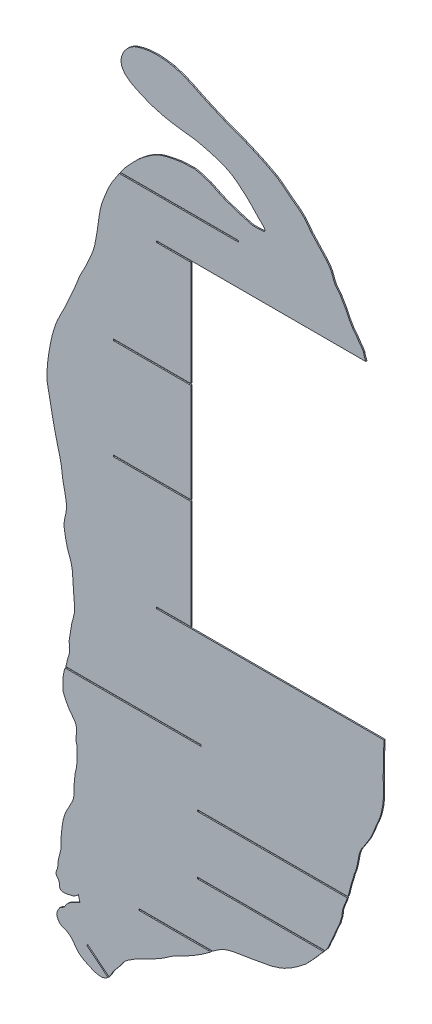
SolidWorks part; units mm, degrees
ref_plane "Спереди" through (0, 0, 0) normal (0, 0, 1) x (1, 0, 0)
ref_plane "Сверху" through (0, 0, 0) normal (0, 1, 0) x (1, 0, 0)
ref_plane "Справа" through (0, 0, 0) normal (1, 0, 0) x (0, 0, -1)
sketch "Model" plane through (0, 0, 0) normal (0, 0, 1) x (1, 0, 0)
  line L0 (-5720.7645, 1756.1752) -> (-5720.7423, 1756.163)
  line L1 (-5720.7423, 1756.163) -> (-5719.6567, 1755.4638)
  line L2 (-5719.6567, 1755.4638) -> (-5719.6284, 1755.4456)
  line L3 (-5719.6284, 1755.4456) -> (-5711.4029, 1749.8688)
  line L4 (-5711.4029, 1749.8688) -> (-5701.3941, 1741.8561)
  line L5 (-5701.3941, 1741.8561) -> (-5694.1958, 1736.0411)
  line L6 (-5694.1958, 1736.0411) -> (-5685.0639, 1729.304)
  line L7 (-5685.0639, 1729.304) -> (-5681.0484, 1726.2993)
  line L8 (-5681.0484, 1726.2993) -> (-5676.3296, 1721.9313)
  line L9 (-5676.3296, 1721.9313) -> (-5674.2817, 1720.0016)
  line L10 (-5674.2817, 1720.0016) -> (-5674.2283, 1719.9514)
  line L11 (-5674.2283, 1719.9514) -> (-5673.5184, 1719.1248)
  line L12 (-5673.5184, 1719.1248) -> (-5669.7691, 1714.4466)
  line L13 (-5669.7691, 1714.4466) -> (-5662.7558, 1705.3026)
  line L14 (-5662.7558, 1705.3026) -> (-5661.6993, 1703.8581)
  line L15 (-5661.6993, 1703.8581) -> (-5661.302, 1703.3875)
  line L16 (-5661.302, 1703.3875) -> (-5638.8204, 1678.9669)
  line L17 (-5638.8204, 1678.9669) -> (-5636.7454, 1676.7139)
  line L18 (-5636.7454, 1676.7139) -> (-5636.463, 1676.3556)
  line L19 (-5636.463, 1676.3556) -> (-5636.4556, 1676.3463)
  line L20 (-5636.4556, 1676.3463) -> (-5631.3712, 1669.6064)
  line L21 (-5631.3712, 1669.6064) -> (-5631.02, 1668.9962)
  line L22 (-5631.02, 1668.9962) -> (-5631.0108, 1668.9803)
  line L23 (-5631.0108, 1668.9803) -> (-5628.262, 1663.5153)
  line L24 (-5628.262, 1663.5153) -> (-5625.3571, 1655.6745)
  line L25 (-5625.3571, 1655.6745) -> (-5625.1771, 1655.1682)
  line L26 (-5625.1771, 1655.1682) -> (-5625.1724, 1655.155)
  line L27 (-5625.1724, 1655.155) -> (-5622.7109, 1649.7953)
  line L28 (-5622.7109, 1649.7953) -> (-5621.6774, 1648.0975)
  line L29 (-5621.6774, 1648.0975) -> (-5619.0281, 1644.9148)
  line L30 (-5619.0281, 1644.9148) -> (-5618.9591, 1644.8318)
  line L31 (-5618.9591, 1644.8318) -> (-5615.1097, 1639.7465)
  line L32 (-5615.1097, 1639.7465) -> (-5613.8187, 1638.0131)
  line L33 (-5613.8187, 1638.0131) -> (-5613.6729, 1637.7924)
  line L34 (-5613.6729, 1637.7924) -> (-5613.6691, 1637.7867)
  line L35 (-5613.6691, 1637.7867) -> (-5605.0998, 1623.1252)
  line L36 (-5605.0998, 1623.1252) -> (-5599.9363, 1612.4005)
  line L37 (-5599.9363, 1612.4005) -> (-5599.7194, 1611.9917)
  line L38 (-5599.7194, 1611.9917) -> (-5599.7137, 1611.981)
  line L39 (-5599.7137, 1611.981) -> (-5593.8555, 1601.8342)
  line L40 (-5593.8555, 1601.8342) -> (-5593.3587, 1600.9935)
  line L41 (-5593.3587, 1600.9935) -> (-5593.3458, 1600.9716)
  line L42 (-5593.3458, 1600.9716) -> (-5592.9846, 1600.469)
  line L43 (-5592.9846, 1600.469) -> (-5592.9752, 1600.4559)
  line L44 (-5592.9752, 1600.4559) -> (-5587.3041, 1593.4584)
  line L45 (-5587.3041, 1593.4584) -> (-5584.6405, 1589.4255)
  line L46 (-5584.6405, 1589.4255) -> (-5583.3314, 1587.4953)
  line L47 (-5583.3314, 1587.4953) -> (-5580.1594, 1583.1247)
  line L48 (-5580.1594, 1583.1247) -> (-5577.6061, 1579.6612)
  line L49 (-5577.6061, 1579.6612) -> (-5576.2619, 1577.1981)
  line L50 (-5576.2619, 1577.1981) -> (-5575.3535, 1575.4191)
  line L51 (-5575.3535, 1575.4191) -> (-5575.3298, 1575.3727)
  line L52 (-5575.3298, 1575.3727) -> (-5574.8334, 1572.975)
  line L53 (-5574.8334, 1572.975) -> (-5574.1541, 1570.9494)
  line L54 (-5574.1541, 1570.9494) -> (-5572.2273, 1565.5162)
  line L55 (-5572.2273, 1565.5162) -> (-5571.4104, 1564.1595)
  line L56 (-5571.4104, 1564.1595) -> (-5919.5427, 1564.1595)
  line L57 (-5919.5427, 1564.1595) -> (-5919.5427, 1563.9095)
  line L58 (-5919.5427, 1563.9095) -> (-5919.5427, 1561.9095)
  line L59 (-5919.5427, 1561.9095) -> (-5919.5427, 1561.6595)
  line L60 (-5919.5427, 1561.6595) -> (-5862.0015, 1561.6595)
  line L61 (-5862.0015, 1561.6595) -> (-5862.0015, 1387.1595)
  line L62 (-5862.0015, 1387.1595) -> (-5990.4768, 1387.1595)
  line L63 (-5990.4768, 1387.1595) -> (-5990.4768, 1386.9095)
  line L64 (-5990.4768, 1386.9095) -> (-5990.4768, 1384.9095)
  line L65 (-5990.4768, 1384.9095) -> (-5990.4768, 1384.6595)
  line L66 (-5990.4768, 1384.6595) -> (-5862.0015, 1384.6595)
  line L67 (-5862.0015, 1384.6595) -> (-5862.0016, 1220.1596)
  line L68 (-5862.0016, 1220.1596) -> (-5990.4768, 1220.1596)
  line L69 (-5990.4768, 1220.1596) -> (-5990.4768, 1219.9096)
  line L70 (-5990.4768, 1219.9096) -> (-5990.4768, 1217.9096)
  line L71 (-5990.4768, 1217.9096) -> (-5990.4768, 1217.6596)
  line L72 (-5990.4768, 1217.6596) -> (-5862.0016, 1217.6596)
  line L73 (-5862.0016, 1217.6596) -> (-5862.0016, 1037.3393)
  line L74 (-5862.0016, 1037.3393) -> (-5919.5428, 1037.3393)
  line L75 (-5919.5428, 1037.3393) -> (-5919.5428, 1037.0893)
  line L76 (-5919.5428, 1037.0893) -> (-5919.5428, 1035.0893)
  line L77 (-5919.5428, 1035.0893) -> (-5919.5428, 1034.8393)
  line L78 (-5919.5428, 1034.8393) -> (-5541.7403, 1034.8393)
  line L79 (-5541.7403, 1034.8393) -> (-5541.561, 1030.4145)
  line L80 (-5541.561, 1030.4145) -> (-5541.5398, 1029.0932)
  line L81 (-5541.5398, 1029.0932) -> (-5541.5392, 1029.0588)
  line L82 (-5541.5392, 1029.0588) -> (-5541.9226, 1021.2011)
  line L83 (-5541.9226, 1021.2011) -> (-5542.4495, 1012.3566)
  line L84 (-5542.4495, 1012.3566) -> (-5542.4994, 1011.1336)
  line L85 (-5542.4994, 1011.1336) -> (-5542.5006, 1011.1017)
  line L86 (-5542.5006, 1011.1017) -> (-5542.5665, 1002.9496)
  line L87 (-5542.5665, 1002.9496) -> (-5542.5913, 1002.4057)
  line L88 (-5542.5913, 1002.4057) -> (-5542.5919, 1002.3915)
  line L89 (-5542.5919, 1002.3915) -> (-5542.5315, 1000.1406)
  line L90 (-5542.5315, 1000.1406) -> (-5542.5299, 1000.0819)
  line L91 (-5542.5299, 1000.0819) -> (-5542.5778, 989.2162)
  line L92 (-5542.5778, 989.2162) -> (-5542.7091, 980.2941)
  line L93 (-5542.7091, 980.2941) -> (-5542.5697, 970.5373)
  line L94 (-5542.5697, 970.5373) -> (-5542.5763, 969.373)
  line L95 (-5542.5763, 969.373) -> (-5542.5764, 969.3427)
  line L96 (-5542.5764, 969.3427) -> (-5542.255, 960.2873)
  line L97 (-5542.255, 960.2873) -> (-5542.2417, 959.2189)
  line L98 (-5542.2417, 959.2189) -> (-5542.2413, 959.1911)
  line L99 (-5542.2413, 959.1911) -> (-5542.2948, 957.2109)
  line L100 (-5542.2948, 957.2109) -> (-5542.2962, 957.1593)
  line L101 (-5542.2962, 957.1593) -> (-5542.6725, 947.5964)
  line L102 (-5542.6725, 947.5964) -> (-5543.3958, 940.8068)
  line L103 (-5543.3958, 940.8068) -> (-5543.6448, 938.8814)
  line L104 (-5543.6448, 938.8814) -> (-5543.6513, 938.8312)
  line L105 (-5543.6513, 938.8312) -> (-5543.8084, 937.9206)
  line L106 (-5543.8084, 937.9206) -> (-5543.8124, 937.8969)
  line L107 (-5543.8124, 937.8969) -> (-5544.9636, 932.0661)
  line L108 (-5544.9636, 932.0661) -> (-5546.9867, 923.516)
  line L109 (-5546.9867, 923.516) -> (-5547.3289, 922.244)
  line L110 (-5547.3289, 922.244) -> (-5547.3378, 922.2109)
  line L111 (-5547.3378, 922.2109) -> (-5547.5449, 921.6065)
  line L112 (-5547.5449, 921.6065) -> (-5547.5503, 921.5907)
  line L113 (-5547.5503, 921.5907) -> (-5547.8286, 920.8103)
  line L114 (-5547.8286, 920.8103) -> (-5547.8358, 920.79)
  line L115 (-5547.8358, 920.79) -> (-5551.1221, 912.351)
  line L116 (-5551.1221, 912.351) -> (-5554.4054, 905.2912)
  line L117 (-5554.4054, 905.2912) -> (-5554.7184, 904.3753)
  line L118 (-5554.7184, 904.3753) -> (-5554.7265, 904.3515)
  line L119 (-5554.7265, 904.3515) -> (-5557.6825, 896.8102)
  line L120 (-5557.6825, 896.8102) -> (-5557.835, 896.3938)
  line L121 (-5557.835, 896.3938) -> (-5557.8389, 896.383)
  line L122 (-5557.8389, 896.383) -> (-5562.5253, 885.5439)
  line L123 (-5562.5253, 885.5439) -> (-5562.765, 885.0756)
  line L124 (-5562.765, 885.0756) -> (-5562.7713, 885.0634)
  line L125 (-5562.7713, 885.0634) -> (-5564.5719, 881.4093)
  line L126 (-5564.5719, 881.4093) -> (-5564.7081, 881.2076)
  line L127 (-5564.7081, 881.2076) -> (-5564.7117, 881.2023)
  line L128 (-5564.7117, 881.2023) -> (-5565.2478, 880.4689)
  line L129 (-5565.2478, 880.4689) -> (-5565.8129, 879.4608)
  line L130 (-5565.8129, 879.4608) -> (-5565.8275, 879.4345)
  line L131 (-5565.8275, 879.4345) -> (-5569.2034, 874.1)
  line L132 (-5569.2034, 874.1) -> (-5572.619, 868.7677)
  line L133 (-5572.619, 868.7677) -> (-5576.0961, 863.3578)
  line L134 (-5576.0961, 863.3578) -> (-5578.5952, 859.5815)
  line L135 (-5578.5952, 859.5815) -> (-5578.6603, 859.4831)
  line L136 (-5578.6603, 859.4831) -> (-5579.4531, 858.2458)
  line L137 (-5579.4531, 858.2458) -> (-5579.4738, 858.2135)
  line L138 (-5579.4738, 858.2135) -> (-5581.3742, 853.3437)
  line L139 (-5581.3742, 853.3437) -> (-5582.2903, 850.8766)
  line L140 (-5582.2903, 850.8766) -> (-5582.3557, 850.7379)
  line L141 (-5582.3557, 850.7379) -> (-5582.3574, 850.7343)
  line L142 (-5582.3574, 850.7343) -> (-5583.4484, 845.5478)
  line L143 (-5583.4484, 845.5478) -> (-5583.6118, 844.9765)
  line L144 (-5583.6118, 844.9765) -> (-5583.6161, 844.9616)
  line L145 (-5583.6161, 844.9616) -> (-5584.6919, 838.3944)
  line L146 (-5584.6919, 838.3944) -> (-5584.7813, 838.1032)
  line L147 (-5584.7813, 838.1032) -> (-5584.7836, 838.0956)
  line L148 (-5584.7836, 838.0956) -> (-5584.919, 837.6078)
  line L149 (-5584.919, 837.6078) -> (-5584.9226, 837.5951)
  line L150 (-5584.9226, 837.5951) -> (-5584.949, 837.5093)
  line L151 (-5584.949, 837.5093) -> (-5584.9497, 837.507)
  line L152 (-5584.9497, 837.507) -> (-5585.1881, 835.9518)
  line L153 (-5585.1881, 835.9518) -> (-5585.1943, 835.9113)
  line L154 (-5585.1943, 835.9113) -> (-5586.7528, 829.1264)
  line L155 (-5586.7528, 829.1264) -> (-5587.5255, 826.0293)
  line L156 (-5587.5255, 826.0293) -> (-5587.5456, 825.9486)
  line L157 (-5587.5456, 825.9486) -> (-5588.4413, 823.0538)
  line L158 (-5588.4413, 823.0538) -> (-5588.4647, 822.9784)
  line L159 (-5588.4647, 822.9784) -> (-5590.8223, 816.9853)
  line L160 (-5590.8223, 816.9853) -> (-5592.0294, 812.859)
  line L161 (-5592.0294, 812.859) -> (-5592.2666, 811.5061)
  line L162 (-5592.2666, 811.5061) -> (-5592.2728, 811.4709)
  line L163 (-5592.2728, 811.4709) -> (-5593.1541, 808.9027)
  line L164 (-5593.1541, 808.9027) -> (-5594.577, 804.3442)
  line L165 (-5594.577, 804.3442) -> (-5595.8833, 799.9225)
  line L166 (-5595.8833, 799.9225) -> (-5596.6396, 797.2211)
  line L167 (-5596.6396, 797.2211) -> (-5599.2746, 786.414)
  line L168 (-5599.2746, 786.414) -> (-5600.2792, 782.6288)
  line L169 (-5600.2792, 782.6288) -> (-5600.3054, 782.5302)
  line L170 (-5600.3054, 782.5302) -> (-5600.3313, 782.4514)
  line L171 (-5600.3313, 782.4514) -> (-5601.2455, 779.6758)
  line L172 (-5601.2455, 779.6758) -> (-5850.9317, 779.6758)
  line L173 (-5850.9317, 779.6758) -> (-5850.9317, 779.4259)
  line L174 (-5850.9317, 779.4259) -> (-5850.9317, 777.4259)
  line L175 (-5850.9317, 777.4259) -> (-5850.9317, 777.1758)
  line L176 (-5850.9317, 777.1758) -> (-5602.1702, 777.1758)
  line L177 (-5602.1702, 777.1758) -> (-5604.2113, 771.6266)
  line L178 (-5604.2113, 771.6266) -> (-5605.1583, 769.0752)
  line L179 (-5605.1583, 769.0752) -> (-5605.183, 769.0087)
  line L180 (-5605.183, 769.0087) -> (-5606.6002, 765.9443)
  line L181 (-5606.6002, 765.9443) -> (-5607.4046, 763.9447)
  line L182 (-5607.4046, 763.9447) -> (-5607.7544, 762.9038)
  line L183 (-5607.7544, 762.9038) -> (-5607.7635, 762.8766)
  line L184 (-5607.7635, 762.8766) -> (-5610.1027, 756.4938)
  line L185 (-5610.1027, 756.4938) -> (-5610.5859, 753.0234)
  line L186 (-5610.5859, 753.0234) -> (-5610.9729, 750.33)
  line L187 (-5610.9729, 750.33) -> (-5611.0358, 749.0144)
  line L188 (-5611.0358, 749.0144) -> (-5611.0374, 748.9801)
  line L189 (-5611.0374, 748.9801) -> (-5611.445, 746.7902)
  line L190 (-5611.445, 746.7902) -> (-5611.4667, 745.4723)
  line L191 (-5611.4667, 745.4723) -> (-5611.4672, 745.4379)
  line L192 (-5611.4672, 745.4379) -> (-5612.1517, 743.0602)
  line L193 (-5612.1517, 743.0602) -> (-5612.1695, 742.9982)
  line L194 (-5612.1695, 742.9982) -> (-5612.6953, 741.4294)
  line L195 (-5612.6953, 741.4294) -> (-5612.7091, 741.3886)
  line L196 (-5612.7091, 741.3886) -> (-5613.4852, 738.8095)
  line L197 (-5613.4852, 738.8095) -> (-5614.4804, 734.7704)
  line L198 (-5614.4804, 734.7704) -> (-5617.9318, 727.475)
  line L199 (-5617.9318, 727.475) -> (-5618.0631, 727.1029)
  line L200 (-5618.0631, 727.1029) -> (-5618.0665, 727.0932)
  line L201 (-5618.0665, 727.0932) -> (-5618.2178, 726.7603)
  line L202 (-5618.2178, 726.7603) -> (-5618.2218, 726.7516)
  line L203 (-5618.2218, 726.7516) -> (-5618.3677, 726.5413)
  line L204 (-5618.3677, 726.5413) -> (-5618.3715, 726.5358)
  line L205 (-5618.3715, 726.5358) -> (-5619.883, 723.3044)
  line L206 (-5619.883, 723.3044) -> (-5622.8162, 716.0453)
  line L207 (-5622.8162, 716.0453) -> (-5624.7991, 711.1867)
  line L208 (-5624.7991, 711.1867) -> (-5625.8775, 708.6988)
  line L209 (-5625.8775, 708.6988) -> (-5625.9056, 708.6339)
  line L210 (-5625.9056, 708.6339) -> (-5628.3768, 703.131)
  line L211 (-5628.3768, 703.131) -> (-5630.4803, 698.7765)
  line L212 (-5630.4803, 698.7765) -> (-5630.6427, 698.3583)
  line L213 (-5630.6427, 698.3583) -> (-5630.647, 698.3473)
  line L214 (-5630.647, 698.3473) -> (-5630.7943, 698.1294)
  line L215 (-5630.7943, 698.1294) -> (-5630.7981, 698.1237)
  line L216 (-5630.7981, 698.1237) -> (-5633.3043, 691.8984)
  line L217 (-5633.3043, 691.8984) -> (-5633.4089, 691.7251)
  line L218 (-5633.4089, 691.7251) -> (-5633.4117, 691.7206)
  line L219 (-5633.4117, 691.7206) -> (-5633.4667, 691.5334)
  line L220 (-5633.4667, 691.5334) -> (-5633.4681, 691.5285)
  line L221 (-5633.4681, 691.5285) -> (-5634.5653, 689.2409)
  line L222 (-5634.5653, 689.2409) -> (-5635.5597, 687.5232)
  line L223 (-5635.5597, 687.5232) -> (-5635.5856, 687.4784)
  line L224 (-5635.5856, 687.4784) -> (-5636.2843, 686.5462)
  line L225 (-5636.2843, 686.5462) -> (-5636.3025, 686.5219)
  line L226 (-5636.3025, 686.5219) -> (-5639.4276, 682.7487)
  line L227 (-5639.4276, 682.7487) -> (-5850.9318, 682.7487)
  line L228 (-5850.9318, 682.7487) -> (-5850.9318, 682.4987)
  line L229 (-5850.9318, 682.4987) -> (-5850.9318, 680.4987)
  line L230 (-5850.9318, 680.4987) -> (-5850.9318, 680.2487)
  line L231 (-5850.9318, 680.2487) -> (-5641.5986, 680.2487)
  line L232 (-5641.5986, 680.2487) -> (-5645.4326, 676.0226)
  line L233 (-5645.4326, 676.0226) -> (-5650.2833, 670.6169)
  line L234 (-5650.2833, 670.6169) -> (-5652.9255, 667.4826)
  line L235 (-5652.9255, 667.4826) -> (-5653.3837, 666.9101)
  line L236 (-5653.3837, 666.9101) -> (-5653.3956, 666.8952)
  line L237 (-5653.3956, 666.8952) -> (-5653.4103, 666.8893)
  line L238 (-5653.4103, 666.8893) -> (-5653.4107, 666.8891)
  line L239 (-5653.4107, 666.8891) -> (-5658.4632, 661.1242)
  line L240 (-5658.4632, 661.1242) -> (-5658.8568, 660.7619)
  line L241 (-5658.8568, 660.7619) -> (-5658.9264, 660.6786)
  line L242 (-5658.9264, 660.6786) -> (-5658.9282, 660.6764)
  line L243 (-5658.9282, 660.6764) -> (-5662.8602, 656.4069)
  line L244 (-5662.8602, 656.4069) -> (-5663.3469, 655.9148)
  line L245 (-5663.3469, 655.9148) -> (-5663.3596, 655.902)
  line L246 (-5663.3596, 655.902) -> (-5669.2565, 649.686)
  line L247 (-5669.2565, 649.686) -> (-5672.9324, 645.8893)
  line L248 (-5672.9324, 645.8893) -> (-5673.2878, 645.5675)
  line L249 (-5673.2878, 645.5675) -> (-5673.6187, 645.844)
  line L250 (-5673.6187, 645.844) -> (-5673.6273, 645.8512)
  line L251 (-5673.6273, 645.8512) -> (-5681.884, 639.2367)
  line L252 (-5681.884, 639.2367) -> (-5683.2779, 638.2514)
  line L253 (-5683.2779, 638.2514) -> (-5683.3142, 638.2257)
  line L254 (-5683.3142, 638.2257) -> (-5683.6707, 637.9219)
  line L255 (-5683.6707, 637.9219) -> (-5683.68, 637.914)
  line L256 (-5683.68, 637.914) -> (-5691.5084, 632.5395)
  line L257 (-5691.5084, 632.5395) -> (-5691.9498, 632.2178)
  line L258 (-5691.9498, 632.2178) -> (-5691.9613, 632.2094)
  line L259 (-5691.9613, 632.2094) -> (-5692.1858, 632.0243)
  line L260 (-5692.1858, 632.0243) -> (-5692.1917, 632.0194)
  line L261 (-5692.1917, 632.0194) -> (-5700.4853, 627.0304)
  line L262 (-5700.4853, 627.0304) -> (-5701.1116, 626.6805)
  line L263 (-5701.1116, 626.6805) -> (-5701.1279, 626.6714)
  line L264 (-5701.1279, 626.6714) -> (-5708.062, 623.1426)
  line L265 (-5708.062, 623.1426) -> (-5708.6421, 622.8932)
  line L266 (-5708.6421, 622.8932) -> (-5708.6572, 622.8867)
  line L267 (-5708.6572, 622.8867) -> (-5713.4533, 620.781)
  line L268 (-5713.4533, 620.781) -> (-5713.876, 620.6418)
  line L269 (-5713.876, 620.6418) -> (-5713.887, 620.6382)
  line L270 (-5713.887, 620.6382) -> (-5719.0112, 619.013)
  line L271 (-5719.0112, 619.013) -> (-5719.1204, 618.9999)
  line L272 (-5719.1204, 618.9999) -> (-5719.1232, 618.9995)
  line L273 (-5719.1232, 618.9995) -> (-5728.9658, 615.9468)
  line L274 (-5728.9658, 615.9468) -> (-5729.1416, 615.9047)
  line L275 (-5729.1416, 615.9047) -> (-5729.1461, 615.9036)
  line L276 (-5729.1461, 615.9036) -> (-5729.6204, 615.8056)
  line L277 (-5729.6204, 615.8056) -> (-5729.6327, 615.803)
  line L278 (-5729.6327, 615.803) -> (-5736.4069, 614.3601)
  line L279 (-5736.4069, 614.3601) -> (-5736.9218, 614.5288)
  line L280 (-5736.9218, 614.5288) -> (-5736.9352, 614.5332)
  line L281 (-5736.9352, 614.5332) -> (-5742.6622, 613.5036)
  line L282 (-5742.6622, 613.5036) -> (-5742.8114, 613.4768)
  line L283 (-5742.8114, 613.4768) -> (-5758.1019, 610.6018)
  line L284 (-5758.1019, 610.6018) -> (-5758.9182, 610.4788)
  line L285 (-5758.9182, 610.4788) -> (-5758.9395, 610.4756)
  line L286 (-5758.9395, 610.4756) -> (-5759.166, 610.4182)
  line L287 (-5759.166, 610.4182) -> (-5759.1719, 610.4168)
  line L288 (-5759.1719, 610.4168) -> (-5769.822, 608.7009)
  line L289 (-5769.822, 608.7009) -> (-5770.6323, 608.5913)
  line L290 (-5770.6323, 608.5913) -> (-5770.6535, 608.5884)
  line L291 (-5770.6535, 608.5884) -> (-5790.8765, 605.249)
  line L292 (-5790.8765, 605.249) -> (-5792.6693, 604.9299)
  line L293 (-5792.6693, 604.9299) -> (-5792.716, 604.9216)
  line L294 (-5792.716, 604.9216) -> (-5801.4142, 602.5936)
  line L295 (-5801.4142, 602.5936) -> (-5801.6408, 602.533)
  line L296 (-5801.6408, 602.533) -> (-5802.0875, 602.4373)
  line L297 (-5802.0875, 602.4373) -> (-5802.0991, 602.4348)
  line L298 (-5802.0991, 602.4348) -> (-5802.2576, 602.3903)
  line L299 (-5802.2576, 602.3903) -> (-5802.2617, 602.3892)
  line L300 (-5802.2617, 602.3892) -> (-5806.2536, 600.8839)
  line L301 (-5806.2536, 600.8839) -> (-5806.3576, 600.8447)
  line L302 (-5806.3576, 600.8447) -> (-5806.4725, 600.8019)
  line L303 (-5806.4725, 600.8019) -> (-5806.4755, 600.8008)
  line L304 (-5806.4755, 600.8008) -> (-5806.5929, 600.747)
  line L305 (-5806.5929, 600.747) -> (-5806.596, 600.7456)
  line L306 (-5806.596, 600.7456) -> (-5812.636, 597.7551)
  line L307 (-5812.636, 597.7551) -> (-5812.7933, 597.6773)
  line L308 (-5812.7933, 597.6773) -> (-5812.9477, 597.5992)
  line L309 (-5812.9477, 597.5992) -> (-5812.9517, 597.5972)
  line L310 (-5812.9517, 597.5972) -> (-5813.1488, 597.4587)
  line L311 (-5813.1488, 597.4587) -> (-5813.1539, 597.4551)
  line L312 (-5813.1539, 597.4551) -> (-5813.2656, 597.3735)
  line L313 (-5813.2656, 597.3735) -> (-5813.2685, 597.3714)
  line L314 (-5813.2685, 597.3714) -> (-5820.4168, 592.7578)
  line L315 (-5820.4168, 592.7578) -> (-5825.6087, 588.7793)
  line L316 (-5825.6087, 588.7793) -> (-5948.6192, 588.7793)
  line L317 (-5948.6192, 588.7793) -> (-5948.6192, 588.5293)
  line L318 (-5948.6192, 588.5293) -> (-5948.6192, 586.5293)
  line L319 (-5948.6192, 586.5293) -> (-5948.6192, 586.2793)
  line L320 (-5948.6192, 586.2793) -> (-5828.8713, 586.2793)
  line L321 (-5828.8713, 586.2793) -> (-5832.3909, 583.5823)
  line L322 (-5832.3909, 583.5823) -> (-5833.4257, 582.8095)
  line L323 (-5833.4257, 582.8095) -> (-5833.4526, 582.7893)
  line L324 (-5833.4526, 582.7893) -> (-5844.6318, 574.8821)
  line L325 (-5844.6318, 574.8821) -> (-5845.0852, 574.5791)
  line L326 (-5845.0852, 574.5791) -> (-5845.692, 574.172)
  line L327 (-5845.692, 574.172) -> (-5845.7078, 574.1614)
  line L328 (-5845.7078, 574.1614) -> (-5856.1757, 567.7527)
  line L329 (-5856.1757, 567.7527) -> (-5856.8114, 567.377)
  line L330 (-5856.8114, 567.377) -> (-5856.828, 567.3672)
  line L331 (-5856.828, 567.3672) -> (-5857.7402, 566.8385)
  line L332 (-5857.7402, 566.8385) -> (-5857.7639, 566.8247)
  line L333 (-5857.7639, 566.8247) -> (-5868.8213, 560.5159)
  line L334 (-5868.8213, 560.5159) -> (-5883.6381, 553.1712)
  line L335 (-5883.6381, 553.1712) -> (-5885.0059, 552.5109)
  line L336 (-5885.0059, 552.5109) -> (-5885.0415, 552.4937)
  line L337 (-5885.0415, 552.4937) -> (-5885.7383, 552.0853)
  line L338 (-5885.7383, 552.0853) -> (-5885.7565, 552.0747)
  line L339 (-5885.7565, 552.0747) -> (-5890.7038, 549.4117)
  line L340 (-5890.7038, 549.4117) -> (-5890.8327, 549.3423)
  line L341 (-5890.8327, 549.3423) -> (-5895.4379, 546.3638)
  line L342 (-5895.4379, 546.3638) -> (-5896.0512, 545.9893)
  line L343 (-5896.0512, 545.9893) -> (-5896.0671, 545.9795)
  line L344 (-5896.0671, 545.9795) -> (-5906.1433, 539.0095)
  line L345 (-5906.1433, 539.0095) -> (-5906.8104, 538.5615)
  line L346 (-5906.8104, 538.5615) -> (-5906.8278, 538.5498)
  line L347 (-5906.8278, 538.5498) -> (-5907.5204, 538.1099)
  line L348 (-5907.5204, 538.1099) -> (-5915.1137, 533.5452)
  line L349 (-5915.1137, 533.5452) -> (-5916.9269, 532.5501)
  line L350 (-5916.9269, 532.5501) -> (-5916.9741, 532.5242)
  line L351 (-5916.9741, 532.5242) -> (-5931.263, 524.7666)
  line L352 (-5931.263, 524.7666) -> (-5932.7254, 524.0669)
  line L353 (-5932.7254, 524.0669) -> (-5932.7634, 524.0486)
  line L354 (-5932.7634, 524.0486) -> (-5948.4082, 516.3801)
  line L355 (-5948.4082, 516.3801) -> (-5949.0545, 516.0315)
  line L356 (-5949.0545, 516.0315) -> (-5956.3504, 511.9844)
  line L357 (-5956.3504, 511.9844) -> (-5957.3703, 511.3503)
  line L358 (-5957.3703, 511.3503) -> (-5957.3969, 511.3338)
  line L359 (-5957.3969, 511.3338) -> (-5967.6246, 504.7581)
  line L360 (-5967.6246, 504.7581) -> (-5971.4758, 501.4592)
  line L361 (-5971.4758, 501.4592) -> (-5971.8981, 501.1369)
  line L362 (-5971.8981, 501.1369) -> (-5971.9091, 501.1284)
  line L363 (-5971.9091, 501.1284) -> (-5972.1318, 500.8996)
  line L364 (-5972.1318, 500.8996) -> (-5972.1376, 500.8936)
  line L365 (-5972.1376, 500.8936) -> (-5975.1629, 497.6174)
  line L366 (-5975.1629, 497.6174) -> (-5975.5079, 497.094)
  line L367 (-5975.5079, 497.094) -> (-5975.5169, 497.0803)
  line L368 (-5975.5169, 497.0803) -> (-5980.5388, 489.9724)
  line L369 (-5980.5388, 489.9724) -> (-5980.9363, 489.4558)
  line L370 (-5980.9363, 489.4558) -> (-5980.9467, 489.4424)
  line L371 (-5980.9467, 489.4424) -> (-5988.408, 480.5349)
  line L372 (-5988.408, 480.5349) -> (-5991.2496, 476.7744)
  line L373 (-5991.2496, 476.7744) -> (-5991.5918, 476.3649)
  line L374 (-5991.5918, 476.3649) -> (-5991.6007, 476.3542)
  line L375 (-5991.6007, 476.3542) -> (-5991.7805, 476.0725)
  line L376 (-5991.7805, 476.0725) -> (-5991.7852, 476.0651)
  line L377 (-5991.7852, 476.0651) -> (-5991.9603, 475.7131)
  line L378 (-5991.9603, 475.7131) -> (-5991.9649, 475.7038)
  line L379 (-5991.9649, 475.7038) -> (-5992.3936, 474.8481)
  line L380 (-5992.3936, 474.8481) -> (-5995.7736, 468.9475)
  line L381 (-5995.7736, 468.9475) -> (-5998.0645, 465.7524)
  line L382 (-5998.0645, 465.7524) -> (-6033.4784, 494.4301)
  line L383 (-6033.4784, 494.4301) -> (-6033.643, 494.2268)
  line L384 (-6033.643, 494.2268) -> (-6033.6459, 494.2291)
  line L385 (-6033.6459, 494.2291) -> (-6034.8726, 492.7146)
  line L386 (-6034.8726, 492.7146) -> (-6034.8696, 492.7121)
  line L387 (-6034.8696, 492.7121) -> (-6035.008, 492.5412)
  line L388 (-6035.008, 492.5412) -> (-5999.7714, 464.0072)
  line L389 (-5999.7714, 464.0072) -> (-6003.1079, 461.6398)
  line L390 (-6003.1079, 461.6398) -> (-6003.2801, 461.5324)
  line L391 (-6003.2801, 461.5324) -> (-6003.2846, 461.5295)
  line L392 (-6003.2846, 461.5295) -> (-6003.3905, 461.4885)
  line L393 (-6003.3905, 461.4885) -> (-6003.3932, 461.4873)
  line L394 (-6003.3932, 461.4873) -> (-6004.248, 461.1423)
  line L395 (-6004.248, 461.1423) -> (-6004.2703, 461.1333)
  line L396 (-6004.2703, 461.1333) -> (-6008.0708, 459.6464)
  line L397 (-6008.0708, 459.6464) -> (-6008.1698, 459.6076)
  line L398 (-6008.1698, 459.6076) -> (-6012.065, 459.3505)
  line L399 (-6012.065, 459.3505) -> (-6012.1665, 459.3437)
  line L400 (-6012.1665, 459.3437) -> (-6013.0173, 459.3219)
  line L401 (-6013.0173, 459.3219) -> (-6013.0394, 459.3212)
  line L402 (-6013.0394, 459.3212) -> (-6016.5416, 459.7731)
  line L403 (-6016.5416, 459.7731) -> (-6016.7288, 459.8103)
  line L404 (-6016.7288, 459.8103) -> (-6016.7337, 459.8112)
  line L405 (-6016.7337, 459.8112) -> (-6020.7661, 460.7807)
  line L406 (-6020.7661, 460.7807) -> (-6020.8711, 460.8059)
  line L407 (-6020.8711, 460.8059) -> (-6021.0174, 460.8571)
  line L408 (-6021.0174, 460.8571) -> (-6021.0213, 460.8584)
  line L409 (-6021.0213, 460.8584) -> (-6026.1447, 462.7315)
  line L410 (-6026.1447, 462.7315) -> (-6026.2782, 462.7802)
  line L411 (-6026.2782, 462.7802) -> (-6027.3551, 463.2395)
  line L412 (-6027.3551, 463.2395) -> (-6033.0088, 465.769)
  line L413 (-6033.0088, 465.769) -> (-6038.6387, 468.4306)
  line L414 (-6038.6387, 468.4306) -> (-6039.4776, 468.9194)
  line L415 (-6039.4776, 468.9194) -> (-6039.4994, 468.9321)
  line L416 (-6039.4994, 468.9321) -> (-6040.1791, 469.3569)
  line L417 (-6040.1791, 469.3569) -> (-6040.1968, 469.3679)
  line L418 (-6040.1968, 469.3679) -> (-6045.2121, 472.3803)
  line L419 (-6045.2121, 472.3803) -> (-6045.3428, 472.4587)
  line L420 (-6045.3428, 472.4587) -> (-6048.9075, 475.4785)
  line L421 (-6048.9075, 475.4785) -> (-6052.3038, 479.3784)
  line L422 (-6052.3038, 479.3784) -> (-6052.84, 479.9528)
  line L423 (-6052.84, 479.9528) -> (-6053.0339, 480.1816)
  line L424 (-6053.0339, 480.1816) -> (-6053.039, 480.1875)
  line L425 (-6053.039, 480.1875) -> (-6056.8781, 486.0669)
  line L426 (-6056.8781, 486.0669) -> (-6057.1957, 486.4362)
  line L427 (-6057.1957, 486.4362) -> (-6057.204, 486.4458)
  line L428 (-6057.204, 486.4458) -> (-6059.5072, 489.413)
  line L429 (-6059.5072, 489.413) -> (-6059.5671, 489.4903)
  line L430 (-6059.5671, 489.4903) -> (-6063.6073, 493.1882)
  line L431 (-6063.6073, 493.1882) -> (-6063.885, 493.4295)
  line L432 (-6063.885, 493.4295) -> (-6063.8922, 493.4358)
  line L433 (-6063.8922, 493.4358) -> (-6068.7172, 496.4773)
  line L434 (-6068.7172, 496.4773) -> (-6068.9197, 496.5986)
  line L435 (-6068.9197, 496.5986) -> (-6068.9249, 496.6018)
  line L436 (-6068.9249, 496.6018) -> (-6069.0206, 496.643)
  line L437 (-6069.0206, 496.643) -> (-6069.0231, 496.6441)
  line L438 (-6069.0231, 496.6441) -> (-6077.4746, 500.1795)
  line L439 (-6077.4746, 500.1795) -> (-6077.6434, 500.2564)
  line L440 (-6077.6434, 500.2564) -> (-6080.928, 502.8386)
  line L441 (-6080.928, 502.8386) -> (-6080.9777, 502.8881)
  line L442 (-6080.9777, 502.8881) -> (-6080.979, 502.8894)
  line L443 (-6080.979, 502.8894) -> (-6081.007, 502.9244)
  line L444 (-6081.007, 502.9244) -> (-6081.0077, 502.9253)
  line L445 (-6081.0077, 502.9253) -> (-6084.408, 509.1157)
  line L446 (-6084.408, 509.1157) -> (-6084.4564, 509.2652)
  line L447 (-6084.4564, 509.2652) -> (-6084.4577, 509.2691)
  line L448 (-6084.4577, 509.2691) -> (-6085.0195, 512.2205)
  line L449 (-6085.0195, 512.2205) -> (-6085.0192, 512.3169)
  line L450 (-6085.0192, 512.3169) -> (-6085.0192, 512.3194)
  line L451 (-6085.0192, 512.3194) -> (-6085.0056, 512.5235)
  line L452 (-6085.0056, 512.5235) -> (-6085.0053, 512.5288)
  line L453 (-6085.0053, 512.5288) -> (-6084.2853, 516.0403)
  line L454 (-6084.2853, 516.0403) -> (-6083.2029, 519.2211)
  line L455 (-6083.2029, 519.2211) -> (-6083.1747, 519.304)
  line L456 (-6083.1747, 519.304) -> (-6083.0755, 519.5486)
  line L457 (-6083.0755, 519.5486) -> (-6083.0729, 519.5549)
  line L458 (-6083.0729, 519.5549) -> (-6082.2755, 520.8148)
  line L459 (-6082.2755, 520.8148) -> (-6082.2548, 520.8477)
  line L460 (-6082.2548, 520.8477) -> (-6080.3015, 523.9099)
  line L461 (-6080.3015, 523.9099) -> (-6080.1409, 524.1023)
  line L462 (-6080.1409, 524.1023) -> (-6079.3021, 524.848)
  line L463 (-6079.3021, 524.848) -> (-6079.2803, 524.8674)
  line L464 (-6079.2803, 524.8674) -> (-6078.761, 525.2755)
  line L465 (-6078.761, 525.2755) -> (-6078.7474, 525.2861)
  line L466 (-6078.7474, 525.2861) -> (-6075.918, 526.8364)
  line L467 (-6075.918, 526.8364) -> (-6075.8607, 526.8845)
  line L468 (-6075.8607, 526.8845) -> (-6073.9029, 528.0642)
  line L469 (-6073.9029, 528.0642) -> (-6073.8519, 528.095)
  line L470 (-6073.8519, 528.095) -> (-6071.5021, 530.302)
  line L471 (-6071.5021, 530.302) -> (-6071.4469, 530.3574)
  line L472 (-6071.4469, 530.3574) -> (-6071.4454, 530.3589)
  line L473 (-6071.4454, 530.3589) -> (-6071.2239, 530.7132)
  line L474 (-6071.2239, 530.7132) -> (-6071.2182, 530.7224)
  line L475 (-6071.2182, 530.7224) -> (-6069.3932, 533.9463)
  line L476 (-6069.3932, 533.9463) -> (-6066.6342, 537.0039)
  line L477 (-6066.6342, 537.0039) -> (-6066.4089, 537.2794)
  line L478 (-6066.4089, 537.2794) -> (-6066.4031, 537.2866)
  line L479 (-6066.4031, 537.2866) -> (-6066.3419, 537.3485)
  line L480 (-6066.3419, 537.3485) -> (-6066.3403, 537.3501)
  line L481 (-6066.3403, 537.3501) -> (-6063.2214, 539.7859)
  line L482 (-6063.2214, 539.7859) -> (-6063.1515, 539.8397)
  line L483 (-6063.1515, 539.8397) -> (-6063.1497, 539.8411)
  line L484 (-6063.1497, 539.8411) -> (-6060.4361, 541.6019)
  line L485 (-6060.4361, 541.6019) -> (-6060.3654, 541.6477)
  line L486 (-6060.3654, 541.6477) -> (-6060.2326, 541.7291)
  line L487 (-6060.2326, 541.7291) -> (-6060.2291, 541.7312)
  line L488 (-6060.2291, 541.7312) -> (-6060.1145, 541.7898)
  line L489 (-6060.1145, 541.7898) -> (-6060.1115, 541.7913)
  line L490 (-6060.1115, 541.7913) -> (-6055.501, 544.0634)
  line L491 (-6055.501, 544.0634) -> (-6055.3809, 544.1226)
  line L492 (-6055.3809, 544.1226) -> (-6055.2175, 544.193)
  line L493 (-6055.2175, 544.193) -> (-6055.2133, 544.1948)
  line L494 (-6055.2133, 544.1948) -> (-6046.812, 548.0784)
  line L495 (-6046.812, 548.0784) -> (-6046.5959, 548.1671)
  line L496 (-6046.5959, 548.1671) -> (-6046.5902, 548.1695)
  line L497 (-6046.5902, 548.1695) -> (-6046.4109, 548.233)
  line L498 (-6046.4109, 548.233) -> (-6046.4063, 548.2346)
  line L499 (-6046.4063, 548.2346) -> (-6049.1226, 558.6489)
  line L500 (-6049.1226, 558.6489) -> (-6050.7388, 556.8391)
  line L501 (-6050.7388, 556.8391) -> (-6050.8156, 556.7154)
  line L502 (-6050.8156, 556.7154) -> (-6050.8176, 556.7122)
  line L503 (-6050.8176, 556.7122) -> (-6050.9495, 556.6174)
  line L504 (-6050.9495, 556.6174) -> (-6050.9529, 556.615)
  line L505 (-6050.9529, 556.615) -> (-6055.692, 553.2566)
  line L506 (-6055.692, 553.2566) -> (-6055.6948, 553.255)
  line L507 (-6055.6948, 553.255) -> (-6055.6976, 553.2537)
  line L508 (-6055.6976, 553.2537) -> (-6055.7003, 553.252)
  line L509 (-6055.7003, 553.252) -> (-6055.7032, 553.2506)
  line L510 (-6055.7032, 553.2506) -> (-6055.7059, 553.2484)
  line L511 (-6055.7059, 553.2484) -> (-6055.7088, 553.2469)
  line L512 (-6055.7088, 553.2469) -> (-6055.7116, 553.2457)
  line L513 (-6055.7116, 553.2457) -> (-6058.1073, 552.2465)
  line L514 (-6058.1073, 552.2465) -> (-6058.1697, 552.2205)
  line L515 (-6058.1697, 552.2205) -> (-6058.2439, 552.1924)
  line L516 (-6058.2439, 552.1924) -> (-6058.2459, 552.1917)
  line L517 (-6058.2459, 552.1917) -> (-6058.4607, 552.1279)
  line L518 (-6058.4607, 552.1279) -> (-6058.4663, 552.1262)
  line L519 (-6058.4663, 552.1262) -> (-6059.4382, 551.8976)
  line L520 (-6059.4382, 551.8976) -> (-6059.4635, 551.8916)
  line L521 (-6059.4635, 551.8916) -> (-6067.6043, 550.0833)
  line L522 (-6067.6043, 550.0833) -> (-6072.8237, 549.4534)
  line L523 (-6072.8237, 549.4534) -> (-6073.2406, 549.4213)
  line L524 (-6073.2406, 549.4213) -> (-6073.2515, 549.4204)
  line L525 (-6073.2515, 549.4204) -> (-6073.4925, 549.4268)
  line L526 (-6073.4925, 549.4268) -> (-6073.4988, 549.427)
  line L527 (-6073.4988, 549.427) -> (-6075.704, 549.6643)
  line L528 (-6075.704, 549.6643) -> (-6075.7615, 549.6704)
  line L529 (-6075.7615, 549.6704) -> (-6077.787, 550.3313)
  line L530 (-6077.787, 550.3313) -> (-6078.2321, 550.5269)
  line L531 (-6078.2321, 550.5269) -> (-6078.2437, 550.532)
  line L532 (-6078.2437, 550.532) -> (-6079.4532, 551.9439)
  line L533 (-6079.4532, 551.9439) -> (-6079.4848, 551.9807)
  line L534 (-6079.4848, 551.9807) -> (-6079.5522, 552.078)
  line L535 (-6079.5522, 552.078) -> (-6079.554, 552.0806)
  line L536 (-6079.554, 552.0806) -> (-6079.6691, 552.3499)
  line L537 (-6079.6691, 552.3499) -> (-6080.1204, 554.0562)
  line L538 (-6080.1204, 554.0562) -> (-6080.6005, 558.5742)
  line L539 (-6080.6005, 558.5742) -> (-6080.6742, 559.5191)
  line L540 (-6080.6742, 559.5191) -> (-6081.8167, 563.052)
  line L541 (-6081.8167, 563.052) -> (-6081.9385, 563.4658)
  line L542 (-6081.9385, 563.4658) -> (-6081.9417, 563.4766)
  line L543 (-6081.9417, 563.4766) -> (-6082.406, 564.0519)
  line L544 (-6082.406, 564.0519) -> (-6082.4181, 564.0669)
  line L545 (-6082.4181, 564.0669) -> (-6085.3895, 568.2136)
  line L546 (-6085.3895, 568.2136) -> (-6086.22, 570.0934)
  line L547 (-6086.22, 570.0934) -> (-6086.2416, 570.1424)
  line L548 (-6086.2416, 570.1424) -> (-6086.304, 570.4141)
  line L549 (-6086.304, 570.4141) -> (-6086.3057, 570.4212)
  line L550 (-6086.3057, 570.4212) -> (-6086.3072, 570.5413)
  line L551 (-6086.3072, 570.5413) -> (-6086.3073, 570.5445)
  line L552 (-6086.3073, 570.5445) -> (-6086.2213, 572.3235)
  line L553 (-6086.2213, 572.3235) -> (-6086.0617, 572.8491)
  line L554 (-6086.0617, 572.8491) -> (-6086.0575, 572.8628)
  line L555 (-6086.0575, 572.8628) -> (-6083.4589, 580.0269)
  line L556 (-6083.4589, 580.0269) -> (-6083.4269, 580.216)
  line L557 (-6083.4269, 580.216) -> (-6083.426, 580.221)
  line L558 (-6083.426, 580.221) -> (-6082.8793, 588.4055)
  line L559 (-6082.8793, 588.4055) -> (-6082.8569, 588.8184)
  line L560 (-6082.8569, 588.8184) -> (-6082.7069, 589.6216)
  line L561 (-6082.7069, 589.6216) -> (-6081.2841, 596.6887)
  line L562 (-6081.2841, 596.6887) -> (-6078.6132, 607.2295)
  line L563 (-6078.6132, 607.2295) -> (-6078.2799, 608.5056)
  line L564 (-6078.2799, 608.5056) -> (-6077.653, 613.2378)
  line L565 (-6077.653, 613.2378) -> (-6077.6264, 613.4534)
  line L566 (-6077.6264, 613.4534) -> (-6077.6257, 613.459)
  line L567 (-6077.6257, 613.459) -> (-6078.2197, 621.0557)
  line L568 (-6078.2197, 621.0557) -> (-6078.2424, 621.4373)
  line L569 (-6078.2424, 621.4373) -> (-6078.2429, 621.4473)
  line L570 (-6078.2429, 621.4473) -> (-6077.9534, 626.1426)
  line L571 (-6077.9534, 626.1426) -> (-6077.9111, 626.5166)
  line L572 (-6077.9111, 626.5166) -> (-6077.91, 626.5264)
  line L573 (-6077.91, 626.5264) -> (-6077.1909, 631.5439)
  line L574 (-6077.1909, 631.5439) -> (-6076.3452, 641.8529)
  line L575 (-6076.3452, 641.8529) -> (-6076.2992, 642.3286)
  line L576 (-6076.2992, 642.3286) -> (-6076.298, 642.341)
  line L577 (-6076.298, 642.341) -> (-6074.4562, 652.9037)
  line L578 (-6074.4562, 652.9037) -> (-6074.3689, 653.323)
  line L579 (-6074.3689, 653.323) -> (-6074.3666, 653.3339)
  line L580 (-6074.3666, 653.3339) -> (-6074.311, 653.5392)
  line L581 (-6074.311, 653.5392) -> (-6074.3095, 653.5446)
  line L582 (-6074.3095, 653.5446) -> (-6072.2733, 660.8131)
  line L583 (-6072.2733, 660.8131) -> (-6072.1757, 661.0858)
  line L584 (-6072.1757, 661.0858) -> (-6072.1732, 661.0929)
  line L585 (-6072.1732, 661.0929) -> (-6069.8623, 667.0331)
  line L586 (-6069.8623, 667.0331) -> (-6069.7931, 667.1735)
  line L587 (-6069.7931, 667.1735) -> (-6069.7913, 667.1772)
  line L588 (-6069.7913, 667.1772) -> (-6069.4073, 667.9236)
  line L589 (-6069.4073, 667.9236) -> (-6069.3973, 667.943)
  line L590 (-6069.3973, 667.943) -> (-6059.434, 686.9513)
  line L591 (-6059.434, 686.9513) -> (-6057.9368, 690.727)
  line L592 (-6057.9368, 690.727) -> (-6057.8769, 690.8517)
  line L593 (-6057.8769, 690.8517) -> (-6057.8753, 690.8549)
  line L594 (-6057.8753, 690.8549) -> (-6057.8444, 691.0012)
  line L595 (-6057.8444, 691.0012) -> (-6057.8436, 691.005)
  line L596 (-6057.8436, 691.005) -> (-6056.784, 695.3901)
  line L597 (-6056.784, 695.3901) -> (-6056.3281, 702.7514)
  line L598 (-6056.3281, 702.7514) -> (-6056.3021, 702.9563)
  line L599 (-6056.3021, 702.9563) -> (-6056.3015, 702.9616)
  line L600 (-6056.3015, 702.9616) -> (-6056.3048, 703.0846)
  line L601 (-6056.3048, 703.0846) -> (-6056.3049, 703.0878)
  line L602 (-6056.3049, 703.0878) -> (-6056.3343, 703.2343)
  line L603 (-6056.3343, 703.2343) -> (-6056.5014, 705.9599)
  line L604 (-6056.5014, 705.9599) -> (-6056.1418, 713.2592)
  line L605 (-6056.1418, 713.2592) -> (-6056.1024, 713.831)
  line L606 (-6056.1024, 713.831) -> (-6055.5219, 718.611)
  line L607 (-6055.5219, 718.611) -> (-6055.5011, 718.7457)
  line L608 (-6055.5011, 718.7457) -> (-6055.5006, 718.7492)
  line L609 (-6055.5006, 718.7492) -> (-6055.48, 718.9381)
  line L610 (-6055.48, 718.9381) -> (-6055.4794, 718.943)
  line L611 (-6055.4794, 718.943) -> (-6055.4757, 719.0118)
  line L612 (-6055.4757, 719.0118) -> (-6055.4757, 719.0136)
  line L613 (-6055.4757, 719.0136) -> (-6055.2076, 723.2919)
  line L614 (-6055.2076, 723.2919) -> (-6054.4489, 729.5866)
  line L615 (-6054.4489, 729.5866) -> (-6054.4413, 729.6994)
  line L616 (-6054.4413, 729.6994) -> (-6054.4411, 729.7023)
  line L617 (-6054.4411, 729.7023) -> (-6054.4004, 729.9255)
  line L618 (-6054.4004, 729.9255) -> (-6054.3994, 729.9313)
  line L619 (-6054.3994, 729.9313) -> (-6052.2238, 740.3451)
  line L620 (-6052.2238, 740.3451) -> (-6051.768, 743.8149)
  line L621 (-6051.768, 743.8149) -> (-6051.7628, 744.0466)
  line L622 (-6051.7628, 744.0466) -> (-6051.7626, 744.0527)
  line L623 (-6051.7626, 744.0527) -> (-6051.6499, 750.7292)
  line L624 (-6051.6499, 750.7292) -> (-6051.6395, 750.9269)
  line L625 (-6051.6395, 750.9269) -> (-6051.6392, 750.932)
  line L626 (-6051.6392, 750.932) -> (-6051.3784, 757.8153)
  line L627 (-6051.3784, 757.8153) -> (-6051.3881, 758.0219)
  line L628 (-6051.3881, 758.0219) -> (-6051.6134, 763.3871)
  line L629 (-6051.6134, 763.3871) -> (-6051.6188, 763.589)
  line L630 (-6051.6188, 763.589) -> (-6051.3325, 770.8131)
  line L631 (-6051.3325, 770.8131) -> (-6051.3408, 770.896)
  line L632 (-6051.3408, 770.896) -> (-6051.341, 770.8981)
  line L633 (-6051.341, 770.8981) -> (-6051.3942, 771.1698)
  line L634 (-6051.3942, 771.1698) -> (-6052.8486, 777.8656)
  line L635 (-6052.8486, 777.8656) -> (-6052.8539, 777.9789)
  line L636 (-6052.8539, 777.9789) -> (-6052.8541, 777.9819)
  line L637 (-6052.8541, 777.9819) -> (-6052.9916, 782.4408)
  line L638 (-6052.9916, 782.4408) -> (-6052.9677, 782.7226)
  line L639 (-6052.9677, 782.7226) -> (-6052.0018, 792.6332)
  line L640 (-6052.0018, 792.6332) -> (-6052.0062, 793.0568)
  line L641 (-6052.0062, 793.0568) -> (-6052.1773, 797.1286)
  line L642 (-6052.1773, 797.1286) -> (-6052.4064, 798.0453)
  line L643 (-6052.4064, 798.0453) -> (-6053.1232, 800.8664)
  line L644 (-6053.1232, 800.8664) -> (-6053.8753, 802.4623)
  line L645 (-6053.8753, 802.4623) -> (-6054.5561, 804.3813)
  line L646 (-6054.5561, 804.3813) -> (-6056.0642, 806.5041)
  line L647 (-6056.0642, 806.5041) -> (-6057.1241, 808.0181)
  line L648 (-6057.1241, 808.0181) -> (-6057.1517, 808.0575)
  line L649 (-6057.1517, 808.0575) -> (-6061.3537, 813.6928)
  line L650 (-6061.3537, 813.6928) -> (-6061.3737, 813.7187)
  line L651 (-6061.3737, 813.7187) -> (-6061.3742, 813.7194)
  line L652 (-6061.3742, 813.7194) -> (-6061.3837, 813.7332)
  line L653 (-6061.3837, 813.7332) -> (-6061.384, 813.7336)
  line L654 (-6061.384, 813.7336) -> (-6064.5982, 818.1261)
  line L655 (-6064.5982, 818.1261) -> (-6066.4793, 821.3554)
  line L656 (-6066.4793, 821.3554) -> (-6068.2822, 824.5954)
  line L657 (-6068.2822, 824.5954) -> (-6068.3745, 824.7843)
  line L658 (-6068.3745, 824.7843) -> (-6068.3769, 824.7892)
  line L659 (-6068.3769, 824.7892) -> (-6072.4855, 833.3632)
  line L660 (-6072.4855, 833.3632) -> (-6074.0581, 837.3744)
  line L661 (-6074.0581, 837.3744) -> (-6074.1089, 837.5252)
  line L662 (-6074.1089, 837.5252) -> (-6074.1102, 837.5292)
  line L663 (-6074.1102, 837.5292) -> (-6074.1564, 837.6806)
  line L664 (-6074.1564, 837.6806) -> (-6074.2269, 837.9216)
  line L665 (-6074.2269, 837.9216) -> (-6074.2287, 837.9279)
  line L666 (-6074.2287, 837.9279) -> (-6074.8837, 842.4086)
  line L667 (-6074.8837, 842.4086) -> (-6074.9146, 844.9621)
  line L668 (-6074.9146, 844.9621) -> (-6074.8923, 848.4582)
  line L669 (-6074.8923, 848.4582) -> (-6074.5061, 858.3456)
  line L670 (-6074.5061, 858.3456) -> (-6074.4659, 858.9491)
  line L671 (-6074.4659, 858.9491) -> (-6073.2242, 866.2829)
  line L672 (-6073.2242, 866.2829) -> (-6071.9416, 871.3627)
  line L673 (-6071.9416, 871.3627) -> (-6071.8885, 871.5364)
  line L674 (-6071.8885, 871.5364) -> (-6071.8872, 871.5409)
  line L675 (-6071.8872, 871.5409) -> (-6071.7281, 872.0756)
  line L676 (-6071.7281, 872.0756) -> (-6071.1208, 873.6595)
  line L677 (-6071.1208, 873.6595) -> (-5844.9587, 873.6595)
  line L678 (-5844.9587, 873.6595) -> (-5844.9587, 873.9096)
  line L679 (-5844.9587, 873.9096) -> (-5844.9586, 875.9096)
  line L680 (-5844.9586, 875.9096) -> (-5844.9587, 875.9096)
  line L681 (-5844.9587, 875.9096) -> (-5844.9587, 876.1595)
  line L682 (-5844.9587, 876.1595) -> (-6070.1623, 876.1595)
  line L683 (-6070.1623, 876.1595) -> (-6068.7243, 879.9096)
  line L684 (-6068.7243, 879.9096) -> (-6068.6674, 880.222)
  line L685 (-6068.6674, 880.222) -> (-6068.666, 880.2301)
  line L686 (-6068.666, 880.2301) -> (-6067.1885, 888.1906)
  line L687 (-6067.1885, 888.1906) -> (-6067.0662, 888.5823)
  line L688 (-6067.0662, 888.5823) -> (-6067.0631, 888.5924)
  line L689 (-6067.0631, 888.5924) -> (-6064.4558, 896.3527)
  line L690 (-6064.4558, 896.3527) -> (-6064.3637, 896.678)
  line L691 (-6064.3637, 896.678) -> (-6064.3613, 896.6864)
  line L692 (-6064.3613, 896.6864) -> (-6063.6658, 900.7284)
  line L693 (-6063.6658, 900.7284) -> (-6064.2275, 906.6991)
  line L694 (-6064.2275, 906.6991) -> (-6064.2348, 906.9756)
  line L695 (-6064.2348, 906.9756) -> (-6064.2349, 906.9828)
  line L696 (-6064.2349, 906.9828) -> (-6064.0596, 911.0927)
  line L697 (-6064.0596, 911.0927) -> (-6064.0593, 911.3119)
  line L698 (-6064.0593, 911.3119) -> (-6064.0593, 911.3175)
  line L699 (-6064.0593, 911.3175) -> (-6064.0688, 911.4315)
  line L700 (-6064.0688, 911.4315) -> (-6064.069, 911.4345)
  line L701 (-6064.069, 911.4345) -> (-6064.0881, 911.4902)
  line L702 (-6064.0881, 911.4902) -> (-6064.0886, 911.4916)
  line L703 (-6064.0886, 911.4916) -> (-6064.4406, 915.3236)
  line L704 (-6064.4406, 915.3236) -> (-6063.7697, 920.4037)
  line L705 (-6063.7697, 920.4037) -> (-6063.697, 920.6855)
  line L706 (-6063.697, 920.6855) -> (-6063.6951, 920.6928)
  line L707 (-6063.6951, 920.6928) -> (-6063.6855, 920.8986)
  line L708 (-6063.6855, 920.8986) -> (-6063.6853, 920.904)
  line L709 (-6063.6853, 920.904) -> (-6062.3162, 928.5595)
  line L710 (-6062.3162, 928.5595) -> (-6062.2879, 928.706)
  line L711 (-6062.2879, 928.706) -> (-6062.2872, 928.7099)
  line L712 (-6062.2872, 928.7099) -> (-6062.2759, 928.8569)
  line L713 (-6062.2759, 928.8569) -> (-6062.2756, 928.8608)
  line L714 (-6062.2756, 928.8608) -> (-6062.2695, 929.0163)
  line L715 (-6062.2695, 929.0163) -> (-6062.2694, 929.0204)
  line L716 (-6062.2694, 929.0204) -> (-6061.6035, 934.0585)
  line L717 (-6061.6035, 934.0585) -> (-6060.554, 939.3937)
  line L718 (-6060.554, 939.3937) -> (-6060.4962, 939.6242)
  line L719 (-6060.4962, 939.6242) -> (-6060.4947, 939.6303)
  line L720 (-6060.4947, 939.6303) -> (-6060.3997, 940.3603)
  line L721 (-6060.3997, 940.3603) -> (-6059.9077, 944.1974)
  line L722 (-6059.9077, 944.1974) -> (-6058.7263, 948.0905)
  line L723 (-6058.7263, 948.0905) -> (-6058.5776, 948.4848)
  line L724 (-6058.5776, 948.4848) -> (-6058.5737, 948.495)
  line L725 (-6058.5737, 948.495) -> (-6058.5366, 948.693)
  line L726 (-6058.5366, 948.693) -> (-6058.5356, 948.6982)
  line L727 (-6058.5356, 948.6982) -> (-6057.4581, 953.0746)
  line L728 (-6057.4581, 953.0746) -> (-6057.4185, 953.1822)
  line L729 (-6057.4185, 953.1822) -> (-6057.4174, 953.185)
  line L730 (-6057.4174, 953.185) -> (-6055.9058, 959.5221)
  line L731 (-6055.9058, 959.5221) -> (-6055.8762, 959.7936)
  line L732 (-6055.8762, 959.7936) -> (-6055.8112, 964.2228)
  line L733 (-6055.8112, 964.2228) -> (-6055.7893, 964.3656)
  line L734 (-6055.7893, 964.3656) -> (-6055.7888, 964.3693)
  line L735 (-6055.7888, 964.3693) -> (-6055.762, 968.1039)
  line L736 (-6055.762, 968.1039) -> (-6055.7366, 968.2807)
  line L737 (-6055.7366, 968.2807) -> (-6055.7645, 968.4944)
  line L738 (-6055.7645, 968.4944) -> (-6055.7652, 968.4999)
  line L739 (-6055.7652, 968.4999) -> (-6055.5516, 971.0815)
  line L740 (-6055.5516, 971.0815) -> (-6055.7237, 974.4381)
  line L741 (-6055.7237, 974.4381) -> (-6055.7207, 974.668)
  line L742 (-6055.7207, 974.668) -> (-6055.7207, 974.674)
  line L743 (-6055.7207, 974.674) -> (-6055.8813, 976.3315)
  line L744 (-6055.8813, 976.3315) -> (-6056.8496, 987.5922)
  line L745 (-6056.8496, 987.5922) -> (-6058.5361, 1012.6139)
  line L746 (-6058.5361, 1012.6139) -> (-6058.7894, 1016.5307)
  line L747 (-6058.7894, 1016.5307) -> (-6059.4272, 1021.9047)
  line L748 (-6059.4272, 1021.9047) -> (-6060.3267, 1026.7641)
  line L749 (-6060.3267, 1026.7641) -> (-6060.3748, 1027.1403)
  line L750 (-6060.3748, 1027.1403) -> (-6060.4562, 1027.4408)
  line L751 (-6060.4562, 1027.4408) -> (-6062.3291, 1034.0719)
  line L752 (-6062.3291, 1034.0719) -> (-6062.6765, 1035.0065)
  line L753 (-6062.6765, 1035.0065) -> (-6067.1308, 1047.3937)
  line L754 (-6067.1308, 1047.3937) -> (-6067.3366, 1048.1313)
  line L755 (-6067.3366, 1048.1313) -> (-6067.342, 1048.1506)
  line L756 (-6067.342, 1048.1506) -> (-6068.9282, 1054.5727)
  line L757 (-6068.9282, 1054.5727) -> (-6070.5589, 1062.3791)
  line L758 (-6070.5589, 1062.3791) -> (-6070.7465, 1063.381)
  line L759 (-6070.7465, 1063.381) -> (-6072.4086, 1072.9579)
  line L760 (-6072.4086, 1072.9579) -> (-6072.4653, 1073.3772)
  line L761 (-6072.4653, 1073.3772) -> (-6072.4667, 1073.3881)
  line L762 (-6072.4667, 1073.3881) -> (-6072.486, 1073.5749)
  line L763 (-6072.486, 1073.5749) -> (-6072.4865, 1073.5798)
  line L764 (-6072.4865, 1073.5798) -> (-6072.8375, 1080.0363)
  line L765 (-6072.8375, 1080.0363) -> (-6072.8264, 1080.235)
  line L766 (-6072.8264, 1080.235) -> (-6072.8261, 1080.2402)
  line L767 (-6072.8261, 1080.2402) -> (-6072.0959, 1086.5771)
  line L768 (-6072.0959, 1086.5771) -> (-6072.0029, 1087.0463)
  line L769 (-6072.0029, 1087.0463) -> (-6069.8565, 1096.778)
  line L770 (-6069.8565, 1096.778) -> (-6068.9462, 1103.1401)
  line L771 (-6068.9462, 1103.1401) -> (-6068.9131, 1103.2942)
  line L772 (-6068.9131, 1103.2942) -> (-6068.9122, 1103.2983)
  line L773 (-6068.9122, 1103.2983) -> (-6068.8936, 1103.47)
  line L774 (-6068.8936, 1103.47) -> (-6068.8931, 1103.4745)
  line L775 (-6068.8931, 1103.4745) -> (-6068.8977, 1103.6122)
  line L776 (-6068.8977, 1103.6122) -> (-6068.8178, 1109.2011)
  line L777 (-6068.8178, 1109.2011) -> (-6068.8203, 1109.2756)
  line L778 (-6068.8203, 1109.2756) -> (-6068.8204, 1109.2775)
  line L779 (-6068.8204, 1109.2775) -> (-6068.8694, 1109.5078)
  line L780 (-6068.8694, 1109.5078) -> (-6068.8707, 1109.5138)
  line L781 (-6068.8707, 1109.5138) -> (-6069.2344, 1113.0448)
  line L782 (-6069.2344, 1113.0448) -> (-6071.5841, 1126.6391)
  line L783 (-6071.5841, 1126.6391) -> (-6071.679, 1127.2116)
  line L784 (-6071.679, 1127.2116) -> (-6071.7677, 1127.6271)
  line L785 (-6071.7677, 1127.6271) -> (-6073.7811, 1136.8354)
  line L786 (-6073.7811, 1136.8354) -> (-6073.8302, 1137.0919)
  line L787 (-6073.8302, 1137.0919) -> (-6073.8315, 1137.0985)
  line L788 (-6073.8315, 1137.0985) -> (-6075.1843, 1144.5475)
  line L789 (-6075.1843, 1144.5475) -> (-6075.2739, 1145.2463)
  line L790 (-6075.2739, 1145.2463) -> (-6077.2106, 1160.5928)
  line L791 (-6077.2106, 1160.5928) -> (-6077.2889, 1161.0749)
  line L792 (-6077.2889, 1161.0749) -> (-6079.6213, 1172.6643)
  line L793 (-6079.6213, 1172.6643) -> (-6079.755, 1173.2218)
  line L794 (-6079.755, 1173.2218) -> (-6084.7082, 1192.5008)
  line L795 (-6084.7082, 1192.5008) -> (-6084.9621, 1193.5003)
  line L796 (-6084.9621, 1193.5003) -> (-6087.9289, 1205.8529)
  line L797 (-6087.9289, 1205.8529) -> (-6088.0361, 1206.3051)
  line L798 (-6088.0361, 1206.3051) -> (-6088.2104, 1207.0732)
  line L799 (-6088.2104, 1207.0732) -> (-6092.425, 1226.9196)
  line L800 (-6092.425, 1226.9196) -> (-6092.5419, 1227.5165)
  line L801 (-6092.5419, 1227.5165) -> (-6092.7681, 1228.6589)
  line L802 (-6092.7681, 1228.6589) -> (-6097.1193, 1251.2991)
  line L803 (-6097.1193, 1251.2991) -> (-6100.3982, 1267.5198)
  line L804 (-6100.3982, 1267.5198) -> (-6100.5553, 1268.3135)
  line L805 (-6100.5553, 1268.3135) -> (-6100.573, 1268.4607)
  line L806 (-6100.573, 1268.4607) -> (-6100.5734, 1268.4645)
  line L807 (-6100.5734, 1268.4645) -> (-6101.3593, 1275.8701)
  line L808 (-6101.3593, 1275.8701) -> (-6101.3656, 1276.1135)
  line L809 (-6101.3656, 1276.1135) -> (-6101.3658, 1276.1198)
  line L810 (-6101.3658, 1276.1198) -> (-6101.1283, 1286.5056)
  line L811 (-6101.1283, 1286.5056) -> (-6101.1068, 1286.8613)
  line L812 (-6101.1068, 1286.8613) -> (-6101.1062, 1286.8705)
  line L813 (-6101.1062, 1286.8705) -> (-6099.8982, 1300.1446)
  line L814 (-6099.8982, 1300.1446) -> (-6099.8604, 1300.4721)
  line L815 (-6099.8604, 1300.4721) -> (-6099.8594, 1300.4807)
  line L816 (-6099.8594, 1300.4807) -> (-6099.8305, 1300.7135)
  line L817 (-6099.8305, 1300.7135) -> (-6099.8298, 1300.7195)
  line L818 (-6099.8298, 1300.7195) -> (-6098.2028, 1312.6402)
  line L819 (-6098.2028, 1312.6402) -> (-6098.1186, 1313.1835)
  line L820 (-6098.1186, 1313.1835) -> (-6098.1164, 1313.1977)
  line L821 (-6098.1164, 1313.1977) -> (-6096.4264, 1322.914)
  line L822 (-6096.4264, 1322.914) -> (-6094.7071, 1332.0339)
  line L823 (-6094.7071, 1332.0339) -> (-6094.5854, 1332.6161)
  line L824 (-6094.5854, 1332.6161) -> (-6092.5064, 1341.3824)
  line L825 (-6092.5064, 1341.3824) -> (-6092.4378, 1341.6553)
  line L826 (-6092.4378, 1341.6553) -> (-6092.436, 1341.6624)
  line L827 (-6092.436, 1341.6624) -> (-6092.3112, 1342.1108)
  line L828 (-6092.3112, 1342.1108) -> (-6090.1363, 1349.9367)
  line L829 (-6090.1363, 1349.9367) -> (-6087.0919, 1359.2883)
  line L830 (-6087.0919, 1359.2883) -> (-6086.9629, 1359.6658)
  line L831 (-6086.9629, 1359.6658) -> (-6086.9595, 1359.6756)
  line L832 (-6086.9595, 1359.6756) -> (-6086.8729, 1359.8908)
  line L833 (-6086.8729, 1359.8908) -> (-6086.8707, 1359.8964)
  line L834 (-6086.8707, 1359.8964) -> (-6083.4982, 1368.2613)
  line L835 (-6083.4982, 1368.2613) -> (-6083.3907, 1368.4965)
  line L836 (-6083.3907, 1368.4965) -> (-6083.3879, 1368.5026)
  line L837 (-6083.3879, 1368.5026) -> (-6079.7331, 1376.1663)
  line L838 (-6079.7331, 1376.1663) -> (-6079.5339, 1376.5573)
  line L839 (-6079.5339, 1376.5573) -> (-6079.5288, 1376.5674)
  line L840 (-6079.5288, 1376.5674) -> (-6071.2248, 1392.8723)
  line L841 (-6071.2248, 1392.8723) -> (-6071.0938, 1393.1414)
  line L842 (-6071.0938, 1393.1414) -> (-6071.0904, 1393.1484)
  line L843 (-6071.0904, 1393.1484) -> (-6055.0881, 1428.8797)
  line L844 (-6055.0881, 1428.8797) -> (-6054.8957, 1429.302)
  line L845 (-6054.8957, 1429.302) -> (-6054.8907, 1429.313)
  line L846 (-6054.8907, 1429.313) -> (-6048.9509, 1444.4758)
  line L847 (-6048.9509, 1444.4758) -> (-6048.7142, 1445.0622)
  line L848 (-6048.7142, 1445.0622) -> (-6048.7081, 1445.0775)
  line L849 (-6048.7081, 1445.0775) -> (-6046.0364, 1451.2798)
  line L850 (-6046.0364, 1451.2798) -> (-6045.9448, 1451.4821)
  line L851 (-6045.9448, 1451.4821) -> (-6045.9425, 1451.4874)
  line L852 (-6045.9425, 1451.4874) -> (-6045.8175, 1451.7554)
  line L853 (-6045.8175, 1451.7554) -> (-6043.2495, 1456.7717)
  line L854 (-6043.2495, 1456.7717) -> (-6038.6514, 1465.431)
  line L855 (-6038.6514, 1465.431) -> (-6038.3497, 1465.9803)
  line L856 (-6038.3497, 1465.9803) -> (-6038.2292, 1466.2234)
  line L857 (-6038.2292, 1466.2234) -> (-6038.226, 1466.2297)
  line L858 (-6038.226, 1466.2297) -> (-6035.4104, 1471.9074)
  line L859 (-6035.4104, 1471.9074) -> (-6035.261, 1472.2509)
  line L860 (-6035.261, 1472.2509) -> (-6035.2572, 1472.2598)
  line L861 (-6035.2572, 1472.2598) -> (-6026.5535, 1492.1559)
  line L862 (-6026.5535, 1492.1559) -> (-6026.4836, 1492.3267)
  line L863 (-6026.4836, 1492.3267) -> (-6026.4818, 1492.3311)
  line L864 (-6026.4818, 1492.3311) -> (-6024.3083, 1497.8181)
  line L865 (-6024.3083, 1497.8181) -> (-6024.2945, 1497.8575)
  line L866 (-6024.2945, 1497.8575) -> (-6024.2941, 1497.8586)
  line L867 (-6024.2941, 1497.8586) -> (-6022.6741, 1503.3915)
  line L868 (-6022.6741, 1503.3915) -> (-6022.6163, 1503.6229)
  line L869 (-6022.6163, 1503.6229) -> (-6022.6148, 1503.629)
  line L870 (-6022.6148, 1503.629) -> (-6021.2963, 1509.6111)
  line L871 (-6021.2963, 1509.6111) -> (-6017.8223, 1529.1677)
  line L872 (-6017.8223, 1529.1677) -> (-6017.6942, 1529.9157)
  line L873 (-6017.6942, 1529.9157) -> (-6014.6945, 1551.1649)
  line L874 (-6014.6945, 1551.1649) -> (-6014.5506, 1552.2379)
  line L875 (-6014.5506, 1552.2379) -> (-6012.6898, 1562.5942)
  line L876 (-6012.6898, 1562.5942) -> (-6012.5546, 1563.2314)
  line L877 (-6012.5546, 1563.2314) -> (-6010.2412, 1571.8548)
  line L878 (-6010.2412, 1571.8548) -> (-6007.7252, 1579.0054)
  line L879 (-6007.7252, 1579.0054) -> (-6007.6126, 1579.3829)
  line L880 (-6007.6126, 1579.3829) -> (-6007.6097, 1579.3928)
  line L881 (-6007.6097, 1579.3928) -> (-6007.5013, 1579.6983)
  line L882 (-6007.5013, 1579.6983) -> (-6007.4985, 1579.7062)
  line L883 (-6007.4985, 1579.7062) -> (-6006.8992, 1581.1677)
  line L884 (-6006.8992, 1581.1677) -> (-6006.8836, 1581.2057)
  line L885 (-6006.8836, 1581.2057) -> (-6000.0545, 1597.8823)
  line L886 (-6000.0545, 1597.8823) -> (-5999.3598, 1599.2885)
  line L887 (-5999.3598, 1599.2885) -> (-5999.3417, 1599.3251)
  line L888 (-5999.3417, 1599.3251) -> (-5995.8111, 1606.7101)
  line L889 (-5995.8111, 1606.7101) -> (-5993.5845, 1610.5405)
  line L890 (-5993.5845, 1610.5405) -> (-5991.9836, 1613.3013)
  line L891 (-5991.9836, 1613.3013) -> (-5985.0183, 1623.9139)
  line L892 (-5985.0183, 1623.9139) -> (-5983.3498, 1626.5015)
  line L893 (-5983.3498, 1626.5015) -> (-5980.9363, 1630.0496)
  line L894 (-5980.9363, 1630.0496) -> (-5783.4091, 1630.0496)
  line L895 (-5783.4091, 1630.0496) -> (-5783.4091, 1630.2997)
  line L896 (-5783.4091, 1630.2997) -> (-5783.4091, 1632.2996)
  line L897 (-5783.4091, 1632.2996) -> (-5783.4091, 1632.5496)
  line L898 (-5783.4091, 1632.5496) -> (-5979.2356, 1632.5496)
  line L899 (-5979.2356, 1632.5496) -> (-5976.8497, 1636.0571)
  line L900 (-5976.8497, 1636.0571) -> (-5976.442, 1636.6646)
  line L901 (-5976.442, 1636.6646) -> (-5976.4313, 1636.6805)
  line L902 (-5976.4313, 1636.6805) -> (-5975.7322, 1637.5098)
  line L903 (-5975.7322, 1637.5098) -> (-5971.7402, 1642.6873)
  line L904 (-5971.7402, 1642.6873) -> (-5966.4016, 1648.7596)
  line L905 (-5966.4016, 1648.7596) -> (-5965.3872, 1649.8343)
  line L906 (-5965.3872, 1649.8343) -> (-5957.0622, 1658.6147)
  line L907 (-5957.0622, 1658.6147) -> (-5956.0016, 1659.6525)
  line L908 (-5956.0016, 1659.6525) -> (-5955.9739, 1659.6795)
  line L909 (-5955.9739, 1659.6795) -> (-5950.1926, 1665.5372)
  line L910 (-5950.1926, 1665.5372) -> (-5943.4578, 1671.1445)
  line L911 (-5943.4578, 1671.1445) -> (-5939.585, 1674.3679)
  line L912 (-5939.585, 1674.3679) -> (-5934.3775, 1678.1569)
  line L913 (-5934.3775, 1678.1569) -> (-5931.1159, 1680.5043)
  line L914 (-5931.1159, 1680.5043) -> (-5926.8271, 1683.1942)
  line L915 (-5926.8271, 1683.1942) -> (-5923.0882, 1685.5257)
  line L916 (-5923.0882, 1685.5257) -> (-5919.5305, 1687.3697)
  line L917 (-5919.5305, 1687.3697) -> (-5918.7635, 1687.7949)
  line L918 (-5918.7635, 1687.7949) -> (-5918.7435, 1687.806)
  line L919 (-5918.7435, 1687.806) -> (-5913.1185, 1690.2706)
  line L920 (-5913.1185, 1690.2706) -> (-5912.7012, 1690.4314)
  line L921 (-5912.7012, 1690.4314) -> (-5912.6904, 1690.4356)
  line L922 (-5912.6904, 1690.4356) -> (-5903.9146, 1693.0544)
  line L923 (-5903.9146, 1693.0544) -> (-5903.256, 1693.2312)
  line L924 (-5903.256, 1693.2312) -> (-5903.2388, 1693.2358)
  line L925 (-5903.2388, 1693.2358) -> (-5891.5202, 1695.8041)
  line L926 (-5891.5202, 1695.8041) -> (-5890.5953, 1695.9966)
  line L927 (-5890.5953, 1695.9966) -> (-5890.5712, 1696.0016)
  line L928 (-5890.5712, 1696.0016) -> (-5889.7828, 1696.1419)
  line L929 (-5889.7828, 1696.1419) -> (-5889.7623, 1696.1456)
  line L930 (-5889.7623, 1696.1456) -> (-5880.8346, 1697.6605)
  line L931 (-5880.8346, 1697.6605) -> (-5879.7448, 1697.7886)
  line L932 (-5879.7448, 1697.7886) -> (-5879.7164, 1697.7919)
  line L933 (-5879.7164, 1697.7919) -> (-5872.3587, 1698.4983)
  line L934 (-5872.3587, 1698.4983) -> (-5872.1671, 1698.5167)
  line L935 (-5872.1671, 1698.5167) -> (-5871.1394, 1698.5816)
  line L936 (-5871.1394, 1698.5816) -> (-5862.9037, 1698.7338)
  line L937 (-5862.9037, 1698.7338) -> (-5857.4505, 1699.1693)
  line L938 (-5857.4505, 1699.1693) -> (-5856.7573, 1699.0994)
  line L939 (-5856.7573, 1699.0994) -> (-5856.7393, 1699.0976)
  line L940 (-5856.7393, 1699.0976) -> (-5849.9513, 1697.9102)
  line L941 (-5849.9513, 1697.9102) -> (-5849.6025, 1697.801)
  line L942 (-5849.6025, 1697.801) -> (-5849.5934, 1697.7982)
  line L943 (-5849.5934, 1697.7982) -> (-5840.4733, 1695.1245)
  line L944 (-5840.4733, 1695.1245) -> (-5839.7886, 1694.8735)
  line L945 (-5839.7886, 1694.8735) -> (-5839.7708, 1694.867)
  line L946 (-5839.7708, 1694.867) -> (-5839.1766, 1694.6812)
  line L947 (-5839.1766, 1694.6812) -> (-5839.1611, 1694.6763)
  line L948 (-5839.1611, 1694.6763) -> (-5830.2575, 1691.6962)
  line L949 (-5830.2575, 1691.6962) -> (-5826.5779, 1689.9844)
  line L950 (-5826.5779, 1689.9844) -> (-5826.482, 1689.9398)
  line L951 (-5826.482, 1689.9398) -> (-5825.7088, 1689.6283)
  line L952 (-5825.7088, 1689.6283) -> (-5825.6887, 1689.6202)
  line L953 (-5825.6887, 1689.6202) -> (-5822.5504, 1688.0765)
  line L954 (-5822.5504, 1688.0765) -> (-5815.1532, 1684.5731)
  line L955 (-5815.1532, 1684.5731) -> (-5812.3564, 1683.4144)
  line L956 (-5812.3564, 1683.4144) -> (-5805.9614, 1680.3578)
  line L957 (-5805.9614, 1680.3578) -> (-5805.9583, 1680.3566)
  line L958 (-5805.9583, 1680.3566) -> (-5805.9552, 1680.3556)
  line L959 (-5805.9552, 1680.3556) -> (-5805.9521, 1680.3541)
  line L960 (-5805.9521, 1680.3541) -> (-5805.949, 1680.353)
  line L961 (-5805.949, 1680.353) -> (-5805.9458, 1680.3514)
  line L962 (-5805.9458, 1680.3514) -> (-5805.9427, 1680.3503)
  line L963 (-5805.9427, 1680.3503) -> (-5805.9396, 1680.3494)
  line L964 (-5805.9396, 1680.3494) -> (-5805.908, 1680.3372)
  line L965 (-5805.908, 1680.3372) -> (-5805.9072, 1680.3369)
  line L966 (-5805.9072, 1680.3369) -> (-5805.5894, 1680.2261)
  line L967 (-5805.5894, 1680.2261) -> (-5805.5811, 1680.2232)
  line L968 (-5805.5811, 1680.2232) -> (-5783.6768, 1672.6519)
  line L969 (-5783.6768, 1672.6519) -> (-5781.8538, 1671.9996)
  line L970 (-5781.8538, 1671.9996) -> (-5781.8063, 1671.9826)
  line L971 (-5781.8063, 1671.9826) -> (-5779.9533, 1671.5187)
  line L972 (-5779.9533, 1671.5187) -> (-5774.943, 1670.3895)
  line L973 (-5774.943, 1670.3895) -> (-5769.9326, 1668.7858)
  line L974 (-5769.9326, 1668.7858) -> (-5766.955, 1667.827)
  line L975 (-5766.955, 1667.827) -> (-5766.8774, 1667.8021)
  line L976 (-5766.8774, 1667.8021) -> (-5766.0323, 1667.665)
  line L977 (-5766.0323, 1667.665) -> (-5763.3214, 1666.8438)
  line L978 (-5763.3214, 1666.8438) -> (-5759.418, 1666.0313)
  line L979 (-5759.418, 1666.0313) -> (-5758.7362, 1665.9443)
  line L980 (-5758.7362, 1665.9443) -> (-5758.7185, 1665.9421)
  line L981 (-5758.7185, 1665.9421) -> (-5758.3392, 1665.8922)
  line L982 (-5758.3392, 1665.8922) -> (-5758.3293, 1665.8909)
  line L983 (-5758.3293, 1665.8909) -> (-5750.7122, 1665.9848)
  line L984 (-5750.7122, 1665.9848) -> (-5750.0753, 1665.9695)
  line L985 (-5750.0753, 1665.9695) -> (-5750.0587, 1665.9691)
  line L986 (-5750.0587, 1665.9691) -> (-5749.2863, 1666.0305)
  line L987 (-5749.2863, 1666.0305) -> (-5749.2662, 1666.0322)
  line L988 (-5749.2662, 1666.0322) -> (-5740.8297, 1666.7608)
  line L989 (-5740.8297, 1666.7608) -> (-5740.6983, 1666.807)
  line L990 (-5740.6983, 1666.807) -> (-5740.6949, 1666.8082)
  line L991 (-5740.6949, 1666.8082) -> (-5740.5835, 1666.8318)
  line L992 (-5740.5835, 1666.8318) -> (-5740.5806, 1666.8325)
  line L993 (-5740.5806, 1666.8325) -> (-5740.4958, 1666.9173)
  line L994 (-5740.4958, 1666.9173) -> (-5738.8343, 1668.2651)
  line L995 (-5738.8343, 1668.2651) -> (-5739.2095, 1669.4554)
  line L996 (-5739.2095, 1669.4554) -> (-5739.2072, 1669.5544)
  line L997 (-5739.2072, 1669.5544) -> (-5739.2072, 1669.5569)
  line L998 (-5739.2072, 1669.5569) -> (-5739.2854, 1669.686)
  line L999 (-5739.2854, 1669.686) -> (-5739.2874, 1669.6894)
  line L1000 (-5739.2874, 1669.6894) -> (-5740.2131, 1671.5744)
  line L1001 (-5740.2131, 1671.5744) -> (-5740.4351, 1671.8198)
  line L1002 (-5740.4351, 1671.8198) -> (-5740.4408, 1671.8262)
  line L1003 (-5740.4408, 1671.8262) -> (-5742.2612, 1674.144)
  line L1004 (-5742.2612, 1674.144) -> (-5742.87, 1674.7607)
  line L1005 (-5742.87, 1674.7607) -> (-5742.8859, 1674.7768)
  line L1006 (-5742.8859, 1674.7768) -> (-5750.4371, 1682.3514)
  line L1007 (-5750.4371, 1682.3514) -> (-5759.1585, 1691.6431)
  line L1008 (-5759.1585, 1691.6431) -> (-5759.9774, 1692.5294)
  line L1009 (-5759.9774, 1692.5294) -> (-5759.9987, 1692.5524)
  line L1010 (-5759.9987, 1692.5524) -> (-5769.9729, 1702.4219)
  line L1011 (-5769.9729, 1702.4219) -> (-5770.6423, 1703.065)
  line L1012 (-5770.6423, 1703.065) -> (-5770.6597, 1703.0817)
  line L1013 (-5770.6597, 1703.0817) -> (-5771.0645, 1703.4396)
  line L1014 (-5771.0645, 1703.4396) -> (-5772.8052, 1704.846)
  line L1015 (-5772.8052, 1704.846) -> (-5772.8505, 1704.8826)
  line L1016 (-5772.8505, 1704.8826) -> (-5786.6822, 1716.4512)
  line L1017 (-5786.6822, 1716.4512) -> (-5791.4913, 1719.744)
  line L1018 (-5791.4913, 1719.744) -> (-5794.1331, 1721.6074)
  line L1019 (-5794.1331, 1721.6074) -> (-5796.3314, 1722.7585)
  line L1020 (-5796.3314, 1722.7585) -> (-5804.5966, 1726.9549)
  line L1021 (-5804.5966, 1726.9549) -> (-5804.8916, 1727.0756)
  line L1022 (-5804.8916, 1727.0756) -> (-5804.8992, 1727.0787)
  line L1023 (-5804.8992, 1727.0787) -> (-5816.5935, 1731.626)
  line L1024 (-5816.5935, 1731.626) -> (-5817.9213, 1732.0578)
  line L1025 (-5817.9213, 1732.0578) -> (-5817.9559, 1732.069)
  line L1026 (-5817.9559, 1732.069) -> (-5829.1702, 1735.3853)
  line L1027 (-5829.1702, 1735.3853) -> (-5840.3173, 1738.3477)
  line L1028 (-5840.3173, 1738.3477) -> (-5841.7239, 1738.7404)
  line L1029 (-5841.7239, 1738.7404) -> (-5841.7605, 1738.7507)
  line L1030 (-5841.7605, 1738.7507) -> (-5842.163, 1738.8409)
  line L1031 (-5842.163, 1738.8409) -> (-5842.1735, 1738.8433)
  line L1032 (-5842.1735, 1738.8433) -> (-5850.1091, 1740.6489)
  line L1033 (-5850.1091, 1740.6489) -> (-5850.3882, 1740.6946)
  line L1034 (-5850.3882, 1740.6946) -> (-5850.3955, 1740.6957)
  line L1035 (-5850.3955, 1740.6957) -> (-5857.3704, 1741.8616)
  line L1036 (-5857.3704, 1741.8616) -> (-5857.5521, 1741.892)
  line L1037 (-5857.5521, 1741.892) -> (-5858.812, 1742.0403)
  line L1038 (-5858.812, 1742.0403) -> (-5858.8449, 1742.0441)
  line L1039 (-5858.8449, 1742.0441) -> (-5875.7043, 1744.0582)
  line L1040 (-5875.7043, 1744.0582) -> (-5895.1224, 1746.9189)
  line L1041 (-5895.1224, 1746.9189) -> (-5895.7244, 1747.0232)
  line L1042 (-5895.7244, 1747.0232) -> (-5895.7401, 1747.0259)
  line L1043 (-5895.7401, 1747.0259) -> (-5896.2548, 1747.1168)
  line L1044 (-5896.2548, 1747.1168) -> (-5896.2683, 1747.1192)
  line L1045 (-5896.2683, 1747.1192) -> (-5903.0821, 1748.4346)
  line L1046 (-5903.0821, 1748.4346) -> (-5903.2596, 1748.4688)
  line L1047 (-5903.2596, 1748.4688) -> (-5911.4796, 1750.4059)
  line L1048 (-5911.4796, 1750.4059) -> (-5912.9128, 1750.7847)
  line L1049 (-5912.9128, 1750.7847) -> (-5912.9501, 1750.7946)
  line L1050 (-5912.9501, 1750.7946) -> (-5925.2648, 1754.3655)
  line L1051 (-5925.2648, 1754.3655) -> (-5925.8363, 1754.5613)
  line L1052 (-5925.8363, 1754.5613) -> (-5925.8511, 1754.5665)
  line L1053 (-5925.8511, 1754.5665) -> (-5926.3885, 1754.7443)
  line L1054 (-5926.3885, 1754.7443) -> (-5927.5974, 1755.1884)
  line L1055 (-5927.5974, 1755.1884) -> (-5927.6289, 1755.2)
  line L1056 (-5927.6289, 1755.2) -> (-5936.5014, 1758.4791)
  line L1057 (-5936.5014, 1758.4791) -> (-5936.7325, 1758.5645)
  line L1058 (-5936.7325, 1758.5645) -> (-5941.5938, 1760.4471)
  line L1059 (-5941.5938, 1760.4471) -> (-5946.6258, 1762.7727)
  line L1060 (-5946.6258, 1762.7727) -> (-5946.7569, 1762.8333)
  line L1061 (-5946.7569, 1762.8333) -> (-5951.3374, 1764.9904)
  line L1062 (-5951.3374, 1764.9904) -> (-5951.4567, 1765.0466)
  line L1063 (-5951.4567, 1765.0466) -> (-5958.7006, 1768.5065)
  line L1064 (-5958.7006, 1768.5065) -> (-5959.1691, 1768.7433)
  line L1065 (-5959.1691, 1768.7433) -> (-5959.1813, 1768.7495)
  line L1066 (-5959.1813, 1768.7495) -> (-5959.2944, 1768.8411)
  line L1067 (-5959.2944, 1768.8411) -> (-5959.2973, 1768.8434)
  line L1068 (-5959.2973, 1768.8434) -> (-5959.5227, 1768.9504)
  line L1069 (-5959.5227, 1768.9504) -> (-5959.5285, 1768.9532)
  line L1070 (-5959.5285, 1768.9532) -> (-5963.67, 1771.4391)
  line L1071 (-5963.67, 1771.4391) -> (-5964.1394, 1771.7576)
  line L1072 (-5964.1394, 1771.7576) -> (-5964.1516, 1771.7659)
  line L1073 (-5964.1516, 1771.7659) -> (-5964.8347, 1772.3499)
  line L1074 (-5964.8347, 1772.3499) -> (-5964.8525, 1772.3651)
  line L1075 (-5964.8525, 1772.3651) -> (-5971.4664, 1777.7413)
  line L1076 (-5971.4664, 1777.7413) -> (-5973.3523, 1780.2893)
  line L1077 (-5973.3523, 1780.2893) -> (-5973.4014, 1780.3557)
  line L1078 (-5973.4014, 1780.3557) -> (-5974.8552, 1782.4014)
  line L1079 (-5974.8552, 1782.4014) -> (-5976.083, 1784.8226)
  line L1080 (-5976.083, 1784.8226) -> (-5977.0402, 1786.7568)
  line L1081 (-5977.0402, 1786.7568) -> (-5977.0651, 1786.8072)
  line L1082 (-5977.0651, 1786.8072) -> (-5978.0372, 1791.1218)
  line L1083 (-5978.0372, 1791.1218) -> (-5978.1398, 1791.6749)
  line L1084 (-5978.1398, 1791.6749) -> (-5978.1208, 1794.9272)
  line L1085 (-5978.1208, 1794.9272) -> (-5978.1118, 1795.3865)
  line L1086 (-5978.1118, 1795.3865) -> (-5977.457, 1799.3892)
  line L1087 (-5977.457, 1799.3892) -> (-5975.742, 1804.5285)
  line L1088 (-5975.742, 1804.5285) -> (-5975.6178, 1804.9638)
  line L1089 (-5975.6178, 1804.9638) -> (-5975.6146, 1804.9752)
  line L1090 (-5975.6146, 1804.9752) -> (-5975.4805, 1805.3304)
  line L1091 (-5975.4805, 1805.3304) -> (-5975.477, 1805.3397)
  line L1092 (-5975.477, 1805.3397) -> (-5972.7937, 1810.4694)
  line L1093 (-5972.7937, 1810.4694) -> (-5972.6251, 1810.7582)
  line L1094 (-5972.6251, 1810.7582) -> (-5972.6207, 1810.7657)
  line L1095 (-5972.6207, 1810.7657) -> (-5972.254, 1811.1767)
  line L1096 (-5972.254, 1811.1767) -> (-5966.5415, 1817.5607)
  line L1097 (-5966.5415, 1817.5607) -> (-5966.2806, 1817.782)
  line L1098 (-5966.2806, 1817.782) -> (-5966.2738, 1817.7878)
  line L1099 (-5966.2738, 1817.7878) -> (-5965.8795, 1818.1387)
  line L1100 (-5965.8795, 1818.1387) -> (-5962.0123, 1821.3027)
  line L1101 (-5962.0123, 1821.3027) -> (-5957.9316, 1823.8708)
  line L1102 (-5957.9316, 1823.8708) -> (-5957.5383, 1824.0894)
  line L1103 (-5957.5383, 1824.0894) -> (-5957.528, 1824.095)
  line L1104 (-5957.528, 1824.095) -> (-5957.2098, 1824.2758)
  line L1105 (-5957.2098, 1824.2758) -> (-5957.2015, 1824.2805)
  line L1106 (-5957.2015, 1824.2805) -> (-5956.8424, 1824.4755)
  line L1107 (-5956.8424, 1824.4755) -> (-5956.8331, 1824.4805)
  line L1108 (-5956.8331, 1824.4805) -> (-5953.5332, 1825.9561)
  line L1109 (-5953.5332, 1825.9561) -> (-5953.4472, 1825.9946)
  line L1110 (-5953.4472, 1825.9946) -> (-5950.8427, 1826.9184)
  line L1111 (-5950.8427, 1826.9184) -> (-5950.7749, 1826.9424)
  line L1112 (-5950.7749, 1826.9424) -> (-5946.7997, 1828.0161)
  line L1113 (-5946.7997, 1828.0161) -> (-5946.6961, 1828.044)
  line L1114 (-5946.6961, 1828.044) -> (-5944.5103, 1828.4951)
  line L1115 (-5944.5103, 1828.4951) -> (-5944.4533, 1828.5069)
  line L1116 (-5944.4533, 1828.5069) -> (-5943.3017, 1829.1634)
  line L1117 (-5943.3017, 1829.1634) -> (-5943.2717, 1829.1805)
  line L1118 (-5943.2717, 1829.1805) -> (-5942.5369, 1829.3428)
  line L1119 (-5942.5369, 1829.3428) -> (-5942.5178, 1829.347)
  line L1120 (-5942.5178, 1829.347) -> (-5934.1082, 1830.8038)
  line L1121 (-5934.1082, 1830.8038) -> (-5930.7838, 1831.1872)
  line L1122 (-5930.7838, 1831.1872) -> (-5930.6972, 1831.1972)
  line L1123 (-5930.6972, 1831.1972) -> (-5924.3907, 1831.7602)
  line L1124 (-5924.3907, 1831.7602) -> (-5916.7939, 1831.9689)
  line L1125 (-5916.7939, 1831.9689) -> (-5916.082, 1831.9996)
  line L1126 (-5916.082, 1831.9996) -> (-5916.0634, 1832.0004)
  line L1127 (-5916.0634, 1832.0004) -> (-5909.87, 1831.6291)
  line L1128 (-5909.87, 1831.6291) -> (-5909.7087, 1831.6194)
  line L1129 (-5909.7087, 1831.6194) -> (-5908.9437, 1831.5653)
  line L1130 (-5908.9437, 1831.5653) -> (-5908.9238, 1831.5639)
  line L1131 (-5908.9238, 1831.5639) -> (-5901.9953, 1830.819)
  line L1132 (-5901.9953, 1830.819) -> (-5901.0528, 1830.6891)
  line L1133 (-5901.0528, 1830.6891) -> (-5901.0283, 1830.6857)
  line L1134 (-5901.0283, 1830.6857) -> (-5890.4053, 1829.0023)
  line L1135 (-5890.4053, 1829.0023) -> (-5890.1286, 1828.9584)
  line L1136 (-5890.1286, 1828.9584) -> (-5889.9879, 1828.8949)
  line L1137 (-5889.9879, 1828.8949) -> (-5889.9842, 1828.8932)
  line L1138 (-5889.9842, 1828.8932) -> (-5888.8929, 1828.5662)
  line L1139 (-5888.8929, 1828.5662) -> (-5872.8484, 1823.4805)
  line L1140 (-5872.8484, 1823.4805) -> (-5871.6929, 1822.9634)
  line L1141 (-5871.6929, 1822.9634) -> (-5871.6629, 1822.9499)
  line L1142 (-5871.6629, 1822.9499) -> (-5857.6425, 1816.7016)
  line L1143 (-5857.6425, 1816.7016) -> (-5856.8473, 1816.3123)
  line L1144 (-5856.8473, 1816.3123) -> (-5856.8265, 1816.3022)
  line L1145 (-5856.8265, 1816.3022) -> (-5845.9671, 1810.8781)
  line L1146 (-5845.9671, 1810.8781) -> (-5828.9357, 1803.123)
  line L1147 (-5828.9357, 1803.123) -> (-5828.2228, 1802.7841)
  line L1148 (-5828.2228, 1802.7841) -> (-5828.2042, 1802.7752)
  line L1149 (-5828.2042, 1802.7752) -> (-5826.077, 1801.8576)
  line L1150 (-5826.077, 1801.8576) -> (-5826.0216, 1801.8337)
  line L1151 (-5826.0216, 1801.8337) -> (-5806.2518, 1793.499)
  line L1152 (-5806.2518, 1793.499) -> (-5805.3453, 1793.1722)
  line L1153 (-5805.3453, 1793.1722) -> (-5805.3217, 1793.1638)
  line L1154 (-5805.3217, 1793.1638) -> (-5779.0778, 1783.3931)
  line L1155 (-5779.0778, 1783.3931) -> (-5778.6939, 1783.2357)
  line L1156 (-5778.6939, 1783.2357) -> (-5778.6839, 1783.2316)
  line L1157 (-5778.6839, 1783.2316) -> (-5776.4022, 1782.2865)
  line L1158 (-5776.4022, 1782.2865) -> (-5776.3428, 1782.2619)
  line L1159 (-5776.3428, 1782.2619) -> (-5759.2428, 1774.9667)
  line L1160 (-5759.2428, 1774.9667) -> (-5744.8146, 1768.4107)
  line L1161 (-5744.8146, 1768.4107) -> (-5739.9341, 1766.1855)
  line L1162 (-5739.9341, 1766.1855) -> (-5739.807, 1766.1275)
  line L1163 (-5739.807, 1766.1275) -> (-5725.9043, 1758.8962)
  line L1164 (-5725.9043, 1758.8962) -> (-5721.6198, 1756.643)
  line L1165 (-5721.6198, 1756.643) -> (-5720.7645, 1756.1752)
extrude "Бобышка-Вытянуть1" add sketch "Model" along normal blind 2
